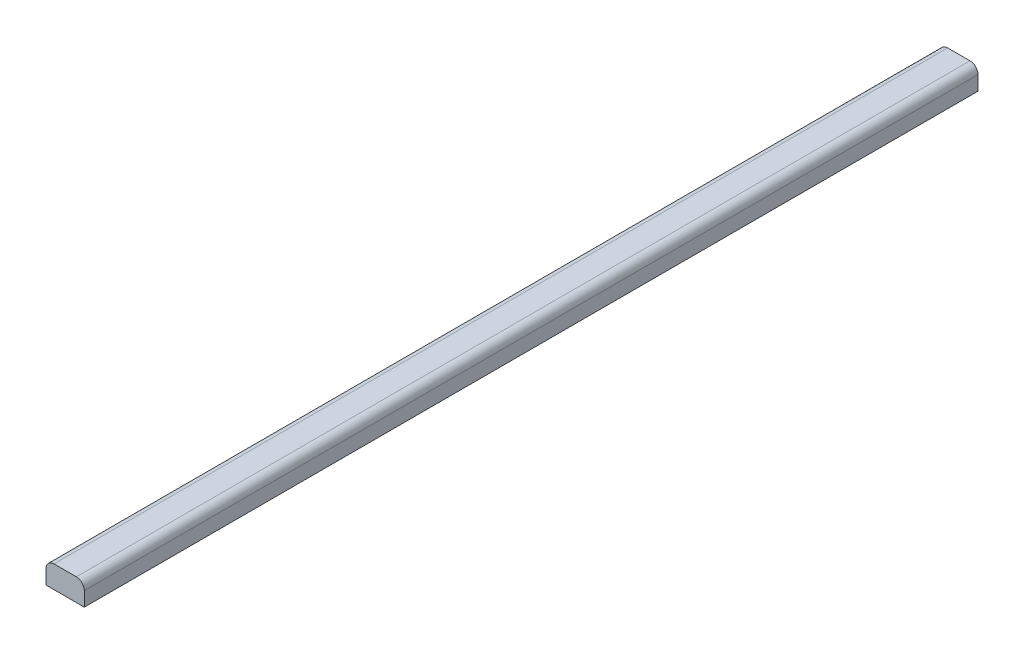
SolidWorks part; units mm, degrees
ref_plane "Front Plane" through (0, 0, 0) normal (0, 0, 1) x (1, 0, 0)
ref_plane "Top Plane" through (0, 0, 0) normal (0, 1, 0) x (1, 0, 0)
ref_plane "Right Plane" through (0, 0, 0) normal (1, 0, 0) x (0, 0, -1)
sketch "Sketch2" plane through (0, 0, 0) normal (0, 0, 1) x (1, 0, 0)
  line L0 (-2814.7066, 100.0325) -> (0, 100.0325) construction
  line L1 (-2814.7066, 115.0325) -> (-43.7201, 115.0325)
  line L2 (0, -115.0325) -> (-2814.7066, -115.0325) construction
  line L3 (-2814.7066, 110.7825) -> (0, 110.7825) construction
  line L4 (-43.1101, 114.7825) -> (-5.1101, 114.7825)
  line L5 (-43.1101, 114.7825) -> (-43.1101, 106.7825)
  line L6 (-43.1101, 106.7825) -> (-5.1101, 106.7825)
  line L7 (-5.1101, 114.7825) -> (-5.1101, 106.7825)
  line L8 (-43.1101, 114.7825) -> (-5.1101, 106.7825) construction
  line L9 (-43.1101, 106.7825) -> (-5.1101, 114.7825) construction
  line L10 (0, -110.7825) -> (-2814.7066, -110.7825) construction
  line L11 (100.8596, 57.9946) -> (93.3663, 55.1929)
  line L12 (114.7825, 19) -> (106.7825, 19)
  line L13 (114.7825, 19) -> (114.7825, -19)
  line L14 (114.7825, -19) -> (106.7825, -19)
  line L15 (106.7825, 19) -> (106.7825, -19)
  line L16 (114.7825, 19) -> (106.7825, -19) construction
  line L17 (114.7825, -19) -> (106.7825, 19) construction
  line L18 (100.8596, 57.9946) -> (114.1675, 22.401)
  line L19 (114.1675, 22.401) -> (106.6741, 19.5994)
  line L20 (93.3663, 55.1929) -> (106.6741, 19.5994)
  line L21 (100.8596, 57.9946) -> (106.6741, 19.5994) construction
  line L22 (114.1675, 22.401) -> (93.3663, 55.1929) construction
  line L23 (74.1623, 89.6438) -> (68.1246, 84.3953)
  line L24 (74.1623, 89.6438) -> (99.0925, 60.9648)
  line L25 (99.0925, 60.9648) -> (93.0548, 55.7163)
  line L26 (68.1246, 84.3953) -> (93.0548, 55.7163)
  line L27 (74.1623, 89.6438) -> (93.0548, 55.7163) construction
  line L28 (99.0925, 60.9648) -> (68.1246, 84.3953) construction
  line L29 (38.0718, 109.9391) -> (34.2545, 102.9086)
  line L30 (38.0718, 109.9391) -> (71.4668, 91.8071)
  line L31 (71.4668, 91.8071) -> (67.6496, 84.7765)
  line L32 (34.2545, 102.9086) -> (67.6496, 84.7765)
  line L33 (38.0718, 109.9391) -> (67.6496, 84.7765) construction
  line L34 (71.4668, 91.8071) -> (34.2545, 102.9086) construction
  line L35 (-2.8407, 116.31) -> (-3.9541, 108.3879)
  line L36 (-2.8407, 116.31) -> (34.7894, 111.0214)
  line L37 (34.7894, 111.0214) -> (33.6761, 103.0993)
  line L38 (-3.9541, 108.3879) -> (33.6761, 103.0993)
  line L39 (-2.8407, 116.31) -> (33.6761, 103.0993) construction
  line L40 (34.7894, 111.0214) -> (-3.9541, 108.3879) construction
  line L41 (-0.0003, 0) -> (106.7825, -19) construction
  line L42 (-81.7201, 114.7825) -> (-43.7201, 114.7825)
  line L43 (-81.7201, 114.7825) -> (-81.7201, 106.7825)
  line L44 (-81.7201, 106.7825) -> (-43.7201, 106.7825)
  line L45 (-43.7201, 114.7825) -> (-43.7201, 106.7825)
  line L46 (-81.7201, 114.7825) -> (-43.7201, 106.7825) construction
  line L47 (-81.7201, 106.7825) -> (-43.7201, 114.7825) construction
  line L48 (-120.3301, 114.7825) -> (-82.3301, 114.7825)
  line L49 (-120.3301, 114.7825) -> (-120.3301, 106.7825)
  line L50 (-120.3301, 106.7825) -> (-82.3301, 106.7825)
  line L51 (-82.3301, 114.7825) -> (-82.3301, 106.7825)
  line L52 (-120.3301, 114.7825) -> (-82.3301, 106.7825) construction
  line L53 (-120.3301, 106.7825) -> (-82.3301, 114.7825) construction
  line L54 (-158.9401, 114.7825) -> (-120.9401, 114.7825)
  line L55 (-158.9401, 114.7825) -> (-158.9401, 106.7825)
  line L56 (-158.9401, 106.7825) -> (-120.9401, 106.7825)
  line L57 (-120.9401, 114.7825) -> (-120.9401, 106.7825)
  line L58 (-158.9401, 114.7825) -> (-120.9401, 106.7825) construction
  line L59 (-158.9401, 106.7825) -> (-120.9401, 114.7825) construction
  line L60 (-197.5501, 114.7825) -> (-159.5501, 114.7825)
  line L61 (-197.5501, 114.7825) -> (-197.5501, 106.7825)
  line L62 (-197.5501, 106.7825) -> (-159.5501, 106.7825)
  line L63 (-159.5501, 114.7825) -> (-159.5501, 106.7825)
  line L64 (-197.5501, 114.7825) -> (-159.5501, 106.7825) construction
  line L65 (-197.5501, 106.7825) -> (-159.5501, 114.7825) construction
  line L66 (-236.1601, 114.7825) -> (-198.1601, 114.7825)
  line L67 (-236.1601, 114.7825) -> (-236.1601, 106.7825)
  line L68 (-236.1601, 106.7825) -> (-198.1601, 106.7825)
  line L69 (-198.1601, 114.7825) -> (-198.1601, 106.7825)
  line L70 (-236.1601, 114.7825) -> (-198.1601, 106.7825) construction
  line L71 (-236.1601, 106.7825) -> (-198.1601, 114.7825) construction
  line L72 (-274.7701, 114.7825) -> (-236.7701, 114.7825)
  line L73 (-274.7701, 114.7825) -> (-274.7701, 106.7825)
  line L74 (-274.7701, 106.7825) -> (-236.7701, 106.7825)
  line L75 (-236.7701, 114.7825) -> (-236.7701, 106.7825)
  line L76 (-274.7701, 114.7825) -> (-236.7701, 106.7825) construction
  line L77 (-274.7701, 106.7825) -> (-236.7701, 114.7825) construction
  line L78 (-313.3801, 114.7825) -> (-275.3801, 114.7825)
  line L79 (-313.3801, 114.7825) -> (-313.3801, 106.7825)
  line L80 (-313.3801, 106.7825) -> (-275.3801, 106.7825)
  line L81 (-275.3801, 114.7825) -> (-275.3801, 106.7825)
  line L82 (-313.3801, 114.7825) -> (-275.3801, 106.7825) construction
  line L83 (-313.3801, 106.7825) -> (-275.3801, 114.7825) construction
  line L84 (-351.9901, 114.7825) -> (-313.9901, 114.7825)
  line L85 (-351.9901, 114.7825) -> (-351.9901, 106.7825)
  line L86 (-351.9901, 106.7825) -> (-313.9901, 106.7825)
  line L87 (-313.9901, 114.7825) -> (-313.9901, 106.7825)
  line L88 (-351.9901, 114.7825) -> (-313.9901, 106.7825) construction
  line L89 (-351.9901, 106.7825) -> (-313.9901, 114.7825) construction
  line L90 (-390.6001, 114.7825) -> (-352.6001, 114.7825)
  line L91 (-390.6001, 114.7825) -> (-390.6001, 106.7825)
  line L92 (-390.6001, 106.7825) -> (-352.6001, 106.7825)
  line L93 (-352.6001, 114.7825) -> (-352.6001, 106.7825)
  line L94 (-390.6001, 114.7825) -> (-352.6001, 106.7825) construction
  line L95 (-390.6001, 106.7825) -> (-352.6001, 114.7825) construction
  line L96 (-429.2101, 114.7825) -> (-391.2101, 114.7825)
  line L97 (-429.2101, 114.7825) -> (-429.2101, 106.7825)
  line L98 (-429.2101, 106.7825) -> (-391.2101, 106.7825)
  line L99 (-391.2101, 114.7825) -> (-391.2101, 106.7825)
  line L100 (-429.2101, 114.7825) -> (-391.2101, 106.7825) construction
  line L101 (-429.2101, 106.7825) -> (-391.2101, 114.7825) construction
  line L102 (-467.8201, 114.7825) -> (-429.8201, 114.7825)
  line L103 (-467.8201, 114.7825) -> (-467.8201, 106.7825)
  line L104 (-467.8201, 106.7825) -> (-429.8201, 106.7825)
  line L105 (-429.8201, 114.7825) -> (-429.8201, 106.7825)
  line L106 (-467.8201, 114.7825) -> (-429.8201, 106.7825) construction
  line L107 (-467.8201, 106.7825) -> (-429.8201, 114.7825) construction
  line L108 (-506.4301, 114.7825) -> (-468.4301, 114.7825)
  line L109 (-506.4301, 114.7825) -> (-506.4301, 106.7825)
  line L110 (-506.4301, 106.7825) -> (-468.4301, 106.7825)
  line L111 (-468.4301, 114.7825) -> (-468.4301, 106.7825)
  line L112 (-506.4301, 114.7825) -> (-468.4301, 106.7825) construction
  line L113 (-506.4301, 106.7825) -> (-468.4301, 114.7825) construction
  line L114 (-545.0401, 114.7825) -> (-507.0401, 114.7825)
  line L115 (-545.0401, 114.7825) -> (-545.0401, 106.7825)
  line L116 (-545.0401, 106.7825) -> (-507.0401, 106.7825)
  line L117 (-507.0401, 114.7825) -> (-507.0401, 106.7825)
  line L118 (-545.0401, 114.7825) -> (-507.0401, 106.7825) construction
  line L119 (-545.0401, 106.7825) -> (-507.0401, 114.7825) construction
  line L120 (-583.6501, 114.7825) -> (-545.6501, 114.7825)
  line L121 (-583.6501, 114.7825) -> (-583.6501, 106.7825)
  line L122 (-583.6501, 106.7825) -> (-545.6501, 106.7825)
  line L123 (-545.6501, 114.7825) -> (-545.6501, 106.7825)
  line L124 (-583.6501, 114.7825) -> (-545.6501, 106.7825) construction
  line L125 (-583.6501, 106.7825) -> (-545.6501, 114.7825) construction
  line L126 (-622.2601, 114.7825) -> (-584.2601, 114.7825)
  line L127 (-622.2601, 114.7825) -> (-622.2601, 106.7825)
  line L128 (-622.2601, 106.7825) -> (-584.2601, 106.7825)
  line L129 (-584.2601, 114.7825) -> (-584.2601, 106.7825)
  line L130 (-622.2601, 114.7825) -> (-584.2601, 106.7825) construction
  line L131 (-622.2601, 106.7825) -> (-584.2601, 114.7825) construction
  line L132 (-660.8701, 114.7825) -> (-622.8701, 114.7825)
  line L133 (-660.8701, 114.7825) -> (-660.8701, 106.7825)
  line L134 (-660.8701, 106.7825) -> (-622.8701, 106.7825)
  line L135 (-622.8701, 114.7825) -> (-622.8701, 106.7825)
  line L136 (-660.8701, 114.7825) -> (-622.8701, 106.7825) construction
  line L137 (-660.8701, 106.7825) -> (-622.8701, 114.7825) construction
  line L138 (-699.4801, 114.7825) -> (-661.4801, 114.7825)
  line L139 (-699.4801, 114.7825) -> (-699.4801, 106.7825)
  line L140 (-699.4801, 106.7825) -> (-661.4801, 106.7825)
  line L141 (-661.4801, 114.7825) -> (-661.4801, 106.7825)
  line L142 (-699.4801, 114.7825) -> (-661.4801, 106.7825) construction
  line L143 (-699.4801, 106.7825) -> (-661.4801, 114.7825) construction
  line L144 (-738.0901, 114.7825) -> (-700.0901, 114.7825)
  line L145 (-738.0901, 114.7825) -> (-738.0901, 106.7825)
  line L146 (-738.0901, 106.7825) -> (-700.0901, 106.7825)
  line L147 (-700.0901, 114.7825) -> (-700.0901, 106.7825)
  line L148 (-738.0901, 114.7825) -> (-700.0901, 106.7825) construction
  line L149 (-738.0901, 106.7825) -> (-700.0901, 114.7825) construction
  line L150 (-776.7001, 114.7825) -> (-738.7001, 114.7825)
  line L151 (-776.7001, 114.7825) -> (-776.7001, 106.7825)
  line L152 (-776.7001, 106.7825) -> (-738.7001, 106.7825)
  line L153 (-738.7001, 114.7825) -> (-738.7001, 106.7825)
  line L154 (-776.7001, 114.7825) -> (-738.7001, 106.7825) construction
  line L155 (-776.7001, 106.7825) -> (-738.7001, 114.7825) construction
  line L156 (-815.3101, 114.7825) -> (-777.3101, 114.7825)
  line L157 (-815.3101, 114.7825) -> (-815.3101, 106.7825)
  line L158 (-815.3101, 106.7825) -> (-777.3101, 106.7825)
  line L159 (-777.3101, 114.7825) -> (-777.3101, 106.7825)
  line L160 (-815.3101, 114.7825) -> (-777.3101, 106.7825) construction
  line L161 (-815.3101, 106.7825) -> (-777.3101, 114.7825) construction
  line L162 (-853.9201, 114.7825) -> (-815.9201, 114.7825)
  line L163 (-853.9201, 114.7825) -> (-853.9201, 106.7825)
  line L164 (-853.9201, 106.7825) -> (-815.9201, 106.7825)
  line L165 (-815.9201, 114.7825) -> (-815.9201, 106.7825)
  line L166 (-853.9201, 114.7825) -> (-815.9201, 106.7825) construction
  line L167 (-853.9201, 106.7825) -> (-815.9201, 114.7825) construction
  line L168 (-892.5301, 114.7825) -> (-854.5301, 114.7825)
  line L169 (-892.5301, 114.7825) -> (-892.5301, 106.7825)
  line L170 (-892.5301, 106.7825) -> (-854.5301, 106.7825)
  line L171 (-854.5301, 114.7825) -> (-854.5301, 106.7825)
  line L172 (-892.5301, 114.7825) -> (-854.5301, 106.7825) construction
  line L173 (-892.5301, 106.7825) -> (-854.5301, 114.7825) construction
  line L174 (-931.1401, 114.7825) -> (-893.1401, 114.7825)
  line L175 (-931.1401, 114.7825) -> (-931.1401, 106.7825)
  line L176 (-931.1401, 106.7825) -> (-893.1401, 106.7825)
  line L177 (-893.1401, 114.7825) -> (-893.1401, 106.7825)
  line L178 (-931.1401, 114.7825) -> (-893.1401, 106.7825) construction
  line L179 (-931.1401, 106.7825) -> (-893.1401, 114.7825) construction
  line L180 (-969.7501, 114.7825) -> (-931.7501, 114.7825)
  line L181 (-969.7501, 114.7825) -> (-969.7501, 106.7825)
  line L182 (-969.7501, 106.7825) -> (-931.7501, 106.7825)
  line L183 (-931.7501, 114.7825) -> (-931.7501, 106.7825)
  line L184 (-969.7501, 114.7825) -> (-931.7501, 106.7825) construction
  line L185 (-969.7501, 106.7825) -> (-931.7501, 114.7825) construction
  line L186 (-1008.3601, 114.7825) -> (-970.3601, 114.7825)
  line L187 (-1008.3601, 114.7825) -> (-1008.3601, 106.7825)
  line L188 (-1008.3601, 106.7825) -> (-970.3601, 106.7825)
  line L189 (-970.3601, 114.7825) -> (-970.3601, 106.7825)
  line L190 (-1008.3601, 114.7825) -> (-970.3601, 106.7825) construction
  line L191 (-1008.3601, 106.7825) -> (-970.3601, 114.7825) construction
  line L192 (-1046.9701, 114.7825) -> (-1008.9701, 114.7825)
  line L193 (-1046.9701, 114.7825) -> (-1046.9701, 106.7825)
  line L194 (-1046.9701, 106.7825) -> (-1008.9701, 106.7825)
  line L195 (-1008.9701, 114.7825) -> (-1008.9701, 106.7825)
  line L196 (-1046.9701, 114.7825) -> (-1008.9701, 106.7825) construction
  line L197 (-1046.9701, 106.7825) -> (-1008.9701, 114.7825) construction
  line L198 (-1085.5801, 114.7825) -> (-1047.5801, 114.7825)
  line L199 (-1085.5801, 114.7825) -> (-1085.5801, 106.7825)
  line L200 (-1085.5801, 106.7825) -> (-1047.5801, 106.7825)
  line L201 (-1047.5801, 114.7825) -> (-1047.5801, 106.7825)
  line L202 (-1085.5801, 114.7825) -> (-1047.5801, 106.7825) construction
  line L203 (-1085.5801, 106.7825) -> (-1047.5801, 114.7825) construction
  line L204 (-1124.1901, 114.7825) -> (-1086.1901, 114.7825)
  line L205 (-1124.1901, 114.7825) -> (-1124.1901, 106.7825)
  line L206 (-1124.1901, 106.7825) -> (-1086.1901, 106.7825)
  line L207 (-1086.1901, 114.7825) -> (-1086.1901, 106.7825)
  line L208 (-1124.1901, 114.7825) -> (-1086.1901, 106.7825) construction
  line L209 (-1124.1901, 106.7825) -> (-1086.1901, 114.7825) construction
  line L210 (-1162.8001, 114.7825) -> (-1124.8001, 114.7825)
  line L211 (-1162.8001, 114.7825) -> (-1162.8001, 106.7825)
  line L212 (-1162.8001, 106.7825) -> (-1124.8001, 106.7825)
  line L213 (-1124.8001, 114.7825) -> (-1124.8001, 106.7825)
  line L214 (-1162.8001, 114.7825) -> (-1124.8001, 106.7825) construction
  line L215 (-1162.8001, 106.7825) -> (-1124.8001, 114.7825) construction
  line L216 (-1201.4101, 114.7825) -> (-1163.4101, 114.7825)
  line L217 (-1201.4101, 114.7825) -> (-1201.4101, 106.7825)
  line L218 (-1201.4101, 106.7825) -> (-1163.4101, 106.7825)
  line L219 (-1163.4101, 114.7825) -> (-1163.4101, 106.7825)
  line L220 (-1201.4101, 114.7825) -> (-1163.4101, 106.7825) construction
  line L221 (-1201.4101, 106.7825) -> (-1163.4101, 114.7825) construction
  line L222 (-1240.0201, 114.7825) -> (-1202.0201, 114.7825)
  line L223 (-1240.0201, 114.7825) -> (-1240.0201, 106.7825)
  line L224 (-1240.0201, 106.7825) -> (-1202.0201, 106.7825)
  line L225 (-1202.0201, 114.7825) -> (-1202.0201, 106.7825)
  line L226 (-1240.0201, 114.7825) -> (-1202.0201, 106.7825) construction
  line L227 (-1240.0201, 106.7825) -> (-1202.0201, 114.7825) construction
  line L228 (-1278.6301, 114.7825) -> (-1240.6301, 114.7825)
  line L229 (-1278.6301, 114.7825) -> (-1278.6301, 106.7825)
  line L230 (-1278.6301, 106.7825) -> (-1240.6301, 106.7825)
  line L231 (-1240.6301, 114.7825) -> (-1240.6301, 106.7825)
  line L232 (-1278.6301, 114.7825) -> (-1240.6301, 106.7825) construction
  line L233 (-1278.6301, 106.7825) -> (-1240.6301, 114.7825) construction
  line L234 (-1317.2401, 114.7825) -> (-1279.2401, 114.7825)
  line L235 (-1317.2401, 114.7825) -> (-1317.2401, 106.7825)
  line L236 (-1317.2401, 106.7825) -> (-1279.2401, 106.7825)
  line L237 (-1279.2401, 114.7825) -> (-1279.2401, 106.7825)
  line L238 (-1317.2401, 114.7825) -> (-1279.2401, 106.7825) construction
  line L239 (-1317.2401, 106.7825) -> (-1279.2401, 114.7825) construction
  line L240 (-1355.8501, 114.7825) -> (-1317.8501, 114.7825)
  line L241 (-1355.8501, 114.7825) -> (-1355.8501, 106.7825)
  line L242 (-1355.8501, 106.7825) -> (-1317.8501, 106.7825)
  line L243 (-1317.8501, 114.7825) -> (-1317.8501, 106.7825)
  line L244 (-1355.8501, 114.7825) -> (-1317.8501, 106.7825) construction
  line L245 (-1355.8501, 106.7825) -> (-1317.8501, 114.7825) construction
  line L246 (-1394.4601, 114.7825) -> (-1356.4601, 114.7825)
  line L247 (-1394.4601, 114.7825) -> (-1394.4601, 106.7825)
  line L248 (-1394.4601, 106.7825) -> (-1356.4601, 106.7825)
  line L249 (-1356.4601, 114.7825) -> (-1356.4601, 106.7825)
  line L250 (-1394.4601, 114.7825) -> (-1356.4601, 106.7825) construction
  line L251 (-1394.4601, 106.7825) -> (-1356.4601, 114.7825) construction
  line L252 (-1433.0701, 114.7825) -> (-1395.0701, 114.7825)
  line L253 (-1433.0701, 114.7825) -> (-1433.0701, 106.7825)
  line L254 (-1433.0701, 106.7825) -> (-1395.0701, 106.7825)
  line L255 (-1395.0701, 114.7825) -> (-1395.0701, 106.7825)
  line L256 (-1433.0701, 114.7825) -> (-1395.0701, 106.7825) construction
  line L257 (-1433.0701, 106.7825) -> (-1395.0701, 114.7825) construction
  line L258 (-1471.6801, 114.7825) -> (-1433.6801, 114.7825)
  line L259 (-1471.6801, 114.7825) -> (-1471.6801, 106.7825)
  line L260 (-1471.6801, 106.7825) -> (-1433.6801, 106.7825)
  line L261 (-1433.6801, 114.7825) -> (-1433.6801, 106.7825)
  line L262 (-1471.6801, 114.7825) -> (-1433.6801, 106.7825) construction
  line L263 (-1471.6801, 106.7825) -> (-1433.6801, 114.7825) construction
  line L264 (-1510.2901, 114.7825) -> (-1472.2901, 114.7825)
  line L265 (-1510.2901, 114.7825) -> (-1510.2901, 106.7825)
  line L266 (-1510.2901, 106.7825) -> (-1472.2901, 106.7825)
  line L267 (-1472.2901, 114.7825) -> (-1472.2901, 106.7825)
  line L268 (-1510.2901, 114.7825) -> (-1472.2901, 106.7825) construction
  line L269 (-1510.2901, 106.7825) -> (-1472.2901, 114.7825) construction
  line L270 (-1548.9001, 114.7825) -> (-1510.9001, 114.7825)
  line L271 (-1548.9001, 114.7825) -> (-1548.9001, 106.7825)
  line L272 (-1548.9001, 106.7825) -> (-1510.9001, 106.7825)
  line L273 (-1510.9001, 114.7825) -> (-1510.9001, 106.7825)
  line L274 (-1548.9001, 114.7825) -> (-1510.9001, 106.7825) construction
  line L275 (-1548.9001, 106.7825) -> (-1510.9001, 114.7825) construction
  line L276 (-1587.5101, 114.7825) -> (-1549.5101, 114.7825)
  line L277 (-1587.5101, 114.7825) -> (-1587.5101, 106.7825)
  line L278 (-1587.5101, 106.7825) -> (-1549.5101, 106.7825)
  line L279 (-1549.5101, 114.7825) -> (-1549.5101, 106.7825)
  line L280 (-1587.5101, 114.7825) -> (-1549.5101, 106.7825) construction
  line L281 (-1587.5101, 106.7825) -> (-1549.5101, 114.7825) construction
  line L282 (-1626.1201, 114.7825) -> (-1588.1201, 114.7825)
  line L283 (-1626.1201, 114.7825) -> (-1626.1201, 106.7825)
  line L284 (-1626.1201, 106.7825) -> (-1588.1201, 106.7825)
  line L285 (-1588.1201, 114.7825) -> (-1588.1201, 106.7825)
  line L286 (-1626.1201, 114.7825) -> (-1588.1201, 106.7825) construction
  line L287 (-1626.1201, 106.7825) -> (-1588.1201, 114.7825) construction
  line L288 (-1664.7301, 114.7825) -> (-1626.7301, 114.7825)
  line L289 (-1664.7301, 114.7825) -> (-1664.7301, 106.7825)
  line L290 (-1664.7301, 106.7825) -> (-1626.7301, 106.7825)
  line L291 (-1626.7301, 114.7825) -> (-1626.7301, 106.7825)
  line L292 (-1664.7301, 114.7825) -> (-1626.7301, 106.7825) construction
  line L293 (-1664.7301, 106.7825) -> (-1626.7301, 114.7825) construction
  line L294 (-1703.3401, 114.7825) -> (-1665.3401, 114.7825)
  line L295 (-1703.3401, 114.7825) -> (-1703.3401, 106.7825)
  line L296 (-1703.3401, 106.7825) -> (-1665.3401, 106.7825)
  line L297 (-1665.3401, 114.7825) -> (-1665.3401, 106.7825)
  line L298 (-1703.3401, 114.7825) -> (-1665.3401, 106.7825) construction
  line L299 (-1703.3401, 106.7825) -> (-1665.3401, 114.7825) construction
  line L300 (-1741.9501, 114.7825) -> (-1703.9501, 114.7825)
  line L301 (-1741.9501, 114.7825) -> (-1741.9501, 106.7825)
  line L302 (-1741.9501, 106.7825) -> (-1703.9501, 106.7825)
  line L303 (-1703.9501, 114.7825) -> (-1703.9501, 106.7825)
  line L304 (-1741.9501, 114.7825) -> (-1703.9501, 106.7825) construction
  line L305 (-1741.9501, 106.7825) -> (-1703.9501, 114.7825) construction
  line L306 (-1780.5601, 114.7825) -> (-1742.5601, 114.7825)
  line L307 (-1780.5601, 114.7825) -> (-1780.5601, 106.7825)
  line L308 (-1780.5601, 106.7825) -> (-1742.5601, 106.7825)
  line L309 (-1742.5601, 114.7825) -> (-1742.5601, 106.7825)
  line L310 (-1780.5601, 114.7825) -> (-1742.5601, 106.7825) construction
  line L311 (-1780.5601, 106.7825) -> (-1742.5601, 114.7825) construction
  line L312 (-1819.1701, 114.7825) -> (-1781.1701, 114.7825)
  line L313 (-1819.1701, 114.7825) -> (-1819.1701, 106.7825)
  line L314 (-1819.1701, 106.7825) -> (-1781.1701, 106.7825)
  line L315 (-1781.1701, 114.7825) -> (-1781.1701, 106.7825)
  line L316 (-1819.1701, 114.7825) -> (-1781.1701, 106.7825) construction
  line L317 (-1819.1701, 106.7825) -> (-1781.1701, 114.7825) construction
  line L318 (-1857.7801, 114.7825) -> (-1819.7801, 114.7825)
  line L319 (-1857.7801, 114.7825) -> (-1857.7801, 106.7825)
  line L320 (-1857.7801, 106.7825) -> (-1819.7801, 106.7825)
  line L321 (-1819.7801, 114.7825) -> (-1819.7801, 106.7825)
  line L322 (-1857.7801, 114.7825) -> (-1819.7801, 106.7825) construction
  line L323 (-1857.7801, 106.7825) -> (-1819.7801, 114.7825) construction
  line L324 (-1896.3901, 114.7825) -> (-1858.3901, 114.7825)
  line L325 (-1896.3901, 114.7825) -> (-1896.3901, 106.7825)
  line L326 (-1896.3901, 106.7825) -> (-1858.3901, 106.7825)
  line L327 (-1858.3901, 114.7825) -> (-1858.3901, 106.7825)
  line L328 (-1896.3901, 114.7825) -> (-1858.3901, 106.7825) construction
  line L329 (-1896.3901, 106.7825) -> (-1858.3901, 114.7825) construction
  line L330 (-1935.0001, 114.7825) -> (-1897.0001, 114.7825)
  line L331 (-1935.0001, 114.7825) -> (-1935.0001, 106.7825)
  line L332 (-1935.0001, 106.7825) -> (-1897.0001, 106.7825)
  line L333 (-1897.0001, 114.7825) -> (-1897.0001, 106.7825)
  line L334 (-1935.0001, 114.7825) -> (-1897.0001, 106.7825) construction
  line L335 (-1935.0001, 106.7825) -> (-1897.0001, 114.7825) construction
  line L336 (-1973.6101, 114.7825) -> (-1935.6101, 114.7825)
  line L337 (-1973.6101, 114.7825) -> (-1973.6101, 106.7825)
  line L338 (-1973.6101, 106.7825) -> (-1935.6101, 106.7825)
  line L339 (-1935.6101, 114.7825) -> (-1935.6101, 106.7825)
  line L340 (-1973.6101, 114.7825) -> (-1935.6101, 106.7825) construction
  line L341 (-1973.6101, 106.7825) -> (-1935.6101, 114.7825) construction
  line L342 (-2012.2201, 114.7825) -> (-1974.2201, 114.7825)
  line L343 (-2012.2201, 114.7825) -> (-2012.2201, 106.7825)
  line L344 (-2012.2201, 106.7825) -> (-1974.2201, 106.7825)
  line L345 (-1974.2201, 114.7825) -> (-1974.2201, 106.7825)
  line L346 (-2012.2201, 114.7825) -> (-1974.2201, 106.7825) construction
  line L347 (-2012.2201, 106.7825) -> (-1974.2201, 114.7825) construction
  line L348 (-2050.8301, 114.7825) -> (-2012.8301, 114.7825)
  line L349 (-2050.8301, 114.7825) -> (-2050.8301, 106.7825)
  line L350 (-2050.8301, 106.7825) -> (-2012.8301, 106.7825)
  line L351 (-2012.8301, 114.7825) -> (-2012.8301, 106.7825)
  line L352 (-2050.8301, 114.7825) -> (-2012.8301, 106.7825) construction
  line L353 (-2050.8301, 106.7825) -> (-2012.8301, 114.7825) construction
  line L354 (-2089.4401, 114.7825) -> (-2051.4401, 114.7825)
  line L355 (-2089.4401, 114.7825) -> (-2089.4401, 106.7825)
  line L356 (-2089.4401, 106.7825) -> (-2051.4401, 106.7825)
  line L357 (-2051.4401, 114.7825) -> (-2051.4401, 106.7825)
  line L358 (-2089.4401, 114.7825) -> (-2051.4401, 106.7825) construction
  line L359 (-2089.4401, 106.7825) -> (-2051.4401, 114.7825) construction
  line L360 (-2128.0501, 114.7825) -> (-2090.0501, 114.7825)
  line L361 (-2128.0501, 114.7825) -> (-2128.0501, 106.7825)
  line L362 (-2128.0501, 106.7825) -> (-2090.0501, 106.7825)
  line L363 (-2090.0501, 114.7825) -> (-2090.0501, 106.7825)
  line L364 (-2128.0501, 114.7825) -> (-2090.0501, 106.7825) construction
  line L365 (-2128.0501, 106.7825) -> (-2090.0501, 114.7825) construction
  line L366 (-2166.6601, 114.7825) -> (-2128.6601, 114.7825)
  line L367 (-2166.6601, 114.7825) -> (-2166.6601, 106.7825)
  line L368 (-2166.6601, 106.7825) -> (-2128.6601, 106.7825)
  line L369 (-2128.6601, 114.7825) -> (-2128.6601, 106.7825)
  line L370 (-2166.6601, 114.7825) -> (-2128.6601, 106.7825) construction
  line L371 (-2166.6601, 106.7825) -> (-2128.6601, 114.7825) construction
  line L372 (-2205.2701, 114.7825) -> (-2167.2701, 114.7825)
  line L373 (-2205.2701, 114.7825) -> (-2205.2701, 106.7825)
  line L374 (-2205.2701, 106.7825) -> (-2167.2701, 106.7825)
  line L375 (-2167.2701, 114.7825) -> (-2167.2701, 106.7825)
  line L376 (-2205.2701, 114.7825) -> (-2167.2701, 106.7825) construction
  line L377 (-2205.2701, 106.7825) -> (-2167.2701, 114.7825) construction
  line L378 (-2243.8801, 114.7825) -> (-2205.8801, 114.7825)
  line L379 (-2243.8801, 114.7825) -> (-2243.8801, 106.7825)
  line L380 (-2243.8801, 106.7825) -> (-2205.8801, 106.7825)
  line L381 (-2205.8801, 114.7825) -> (-2205.8801, 106.7825)
  line L382 (-2243.8801, 114.7825) -> (-2205.8801, 106.7825) construction
  line L383 (-2243.8801, 106.7825) -> (-2205.8801, 114.7825) construction
  line L384 (-2282.4901, 114.7825) -> (-2244.4901, 114.7825)
  line L385 (-2282.4901, 114.7825) -> (-2282.4901, 106.7825)
  line L386 (-2282.4901, 106.7825) -> (-2244.4901, 106.7825)
  line L387 (-2244.4901, 114.7825) -> (-2244.4901, 106.7825)
  line L388 (-2282.4901, 114.7825) -> (-2244.4901, 106.7825) construction
  line L389 (-2282.4901, 106.7825) -> (-2244.4901, 114.7825) construction
  line L390 (-2321.1001, 114.7825) -> (-2283.1001, 114.7825)
  line L391 (-2321.1001, 114.7825) -> (-2321.1001, 106.7825)
  line L392 (-2321.1001, 106.7825) -> (-2283.1001, 106.7825)
  line L393 (-2283.1001, 114.7825) -> (-2283.1001, 106.7825)
  line L394 (-2321.1001, 114.7825) -> (-2283.1001, 106.7825) construction
  line L395 (-2321.1001, 106.7825) -> (-2283.1001, 114.7825) construction
  line L396 (-2359.7101, 114.7825) -> (-2321.7101, 114.7825)
  line L397 (-2359.7101, 114.7825) -> (-2359.7101, 106.7825)
  line L398 (-2359.7101, 106.7825) -> (-2321.7101, 106.7825)
  line L399 (-2321.7101, 114.7825) -> (-2321.7101, 106.7825)
  line L400 (-2359.7101, 114.7825) -> (-2321.7101, 106.7825) construction
  line L401 (-2359.7101, 106.7825) -> (-2321.7101, 114.7825) construction
  line L402 (-2398.3201, 114.7825) -> (-2360.3201, 114.7825)
  line L403 (-2398.3201, 114.7825) -> (-2398.3201, 106.7825)
  line L404 (-2398.3201, 106.7825) -> (-2360.3201, 106.7825)
  line L405 (-2360.3201, 114.7825) -> (-2360.3201, 106.7825)
  line L406 (-2398.3201, 114.7825) -> (-2360.3201, 106.7825) construction
  line L407 (-2398.3201, 106.7825) -> (-2360.3201, 114.7825) construction
  line L408 (-2436.9301, 114.7825) -> (-2398.9301, 114.7825)
  line L409 (-2436.9301, 114.7825) -> (-2436.9301, 106.7825)
  line L410 (-2436.9301, 106.7825) -> (-2398.9301, 106.7825)
  line L411 (-2398.9301, 114.7825) -> (-2398.9301, 106.7825)
  line L412 (-2436.9301, 114.7825) -> (-2398.9301, 106.7825) construction
  line L413 (-2436.9301, 106.7825) -> (-2398.9301, 114.7825) construction
  line L414 (-2475.5401, 114.7825) -> (-2437.5401, 114.7825)
  line L415 (-2475.5401, 114.7825) -> (-2475.5401, 106.7825)
  line L416 (-2475.5401, 106.7825) -> (-2437.5401, 106.7825)
  line L417 (-2437.5401, 114.7825) -> (-2437.5401, 106.7825)
  line L418 (-2475.5401, 114.7825) -> (-2437.5401, 106.7825) construction
  line L419 (-2475.5401, 106.7825) -> (-2437.5401, 114.7825) construction
  line L420 (-2514.1501, 114.7825) -> (-2476.1501, 114.7825)
  line L421 (-2514.1501, 114.7825) -> (-2514.1501, 106.7825)
  line L422 (-2514.1501, 106.7825) -> (-2476.1501, 106.7825)
  line L423 (-2476.1501, 114.7825) -> (-2476.1501, 106.7825)
  line L424 (-2514.1501, 114.7825) -> (-2476.1501, 106.7825) construction
  line L425 (-2514.1501, 106.7825) -> (-2476.1501, 114.7825) construction
  line L426 (-2552.7601, 114.7825) -> (-2514.7601, 114.7825)
  line L427 (-2552.7601, 114.7825) -> (-2552.7601, 106.7825)
  line L428 (-2552.7601, 106.7825) -> (-2514.7601, 106.7825)
  line L429 (-2514.7601, 114.7825) -> (-2514.7601, 106.7825)
  line L430 (-2552.7601, 114.7825) -> (-2514.7601, 106.7825) construction
  line L431 (-2552.7601, 106.7825) -> (-2514.7601, 114.7825) construction
  line L432 (-2591.3701, 114.7825) -> (-2553.3701, 114.7825)
  line L433 (-2591.3701, 114.7825) -> (-2591.3701, 106.7825)
  line L434 (-2591.3701, 106.7825) -> (-2553.3701, 106.7825)
  line L435 (-2553.3701, 114.7825) -> (-2553.3701, 106.7825)
  line L436 (-2591.3701, 114.7825) -> (-2553.3701, 106.7825) construction
  line L437 (-2591.3701, 106.7825) -> (-2553.3701, 114.7825) construction
  line L438 (-2629.9801, 114.7825) -> (-2591.9801, 114.7825)
  line L439 (-2629.9801, 114.7825) -> (-2629.9801, 106.7825)
  line L440 (-2629.9801, 106.7825) -> (-2591.9801, 106.7825)
  line L441 (-2591.9801, 114.7825) -> (-2591.9801, 106.7825)
  line L442 (-2629.9801, 114.7825) -> (-2591.9801, 106.7825) construction
  line L443 (-2629.9801, 106.7825) -> (-2591.9801, 114.7825) construction
  line L444 (-2668.5901, 114.7825) -> (-2630.5901, 114.7825)
  line L445 (-2668.5901, 114.7825) -> (-2668.5901, 106.7825)
  line L446 (-2668.5901, 106.7825) -> (-2630.5901, 106.7825)
  line L447 (-2630.5901, 114.7825) -> (-2630.5901, 106.7825)
  line L448 (-2668.5901, 114.7825) -> (-2630.5901, 106.7825) construction
  line L449 (-2668.5901, 106.7825) -> (-2630.5901, 114.7825) construction
  line L450 (-2707.2001, 114.7825) -> (-2669.2001, 114.7825)
  line L451 (-2707.2001, 114.7825) -> (-2707.2001, 106.7825)
  line L452 (-2707.2001, 106.7825) -> (-2669.2001, 106.7825)
  line L453 (-2669.2001, 114.7825) -> (-2669.2001, 106.7825)
  line L454 (-2707.2001, 114.7825) -> (-2669.2001, 106.7825) construction
  line L455 (-2707.2001, 106.7825) -> (-2669.2001, 114.7825) construction
  line L456 (-2745.8101, 114.7825) -> (-2707.8101, 114.7825)
  line L457 (-2745.8101, 114.7825) -> (-2745.8101, 106.7825)
  line L458 (-2745.8101, 106.7825) -> (-2707.8101, 106.7825)
  line L459 (-2707.8101, 114.7825) -> (-2707.8101, 106.7825)
  line L460 (-2745.8101, 114.7825) -> (-2707.8101, 106.7825) construction
  line L461 (-2745.8101, 106.7825) -> (-2707.8101, 114.7825) construction
  line L462 (-2784.4201, 114.7825) -> (-2746.4201, 114.7825)
  line L463 (-2784.4201, 114.7825) -> (-2784.4201, 106.7825)
  line L464 (-2784.4201, 106.7825) -> (-2746.4201, 106.7825)
  line L465 (-2746.4201, 114.7825) -> (-2746.4201, 106.7825)
  line L466 (-2784.4201, 114.7825) -> (-2746.4201, 106.7825) construction
  line L467 (-2784.4201, 106.7825) -> (-2746.4201, 114.7825) construction
  line L468 (-2823.0301, 114.7825) -> (-2785.0301, 114.7825)
  line L469 (-2823.0301, 114.7825) -> (-2823.0301, 106.7825)
  line L470 (-2823.0301, 106.7825) -> (-2785.0301, 106.7825)
  line L471 (-2785.0301, 114.7825) -> (-2785.0301, 106.7825)
  line L472 (-2823.0301, 114.7825) -> (-2785.0301, 106.7825) construction
  line L473 (-2823.0301, 106.7825) -> (-2785.0301, 114.7825) construction
  line L474 (-4.3831, 116.5123) -> (-43.7201, 115.0325)
  line L475 (-43.7201, 113.7626) -> (-43.7201, 116.4131) construction
  line L477 (-2814.7066, 115.0325) -> (0, 115.0325) construction
  line L478 (-2814.7066, 106.5325) -> (0, 106.5325)
  line L479 (-2814.7066, 106.5325) -> (-43.5603, 106.5325) construction
  line L480 (-4.0636, 108.0183) -> (-43.5603, 106.5325) construction
  line L481 (0, 0) -> (-3348.6754, 0) construction
  arc A0 (0, 115.0325) -> (0, -115.0325) centre (0, 0) cw construction
  arc A1 (0, 110.7825) -> (0, -110.7825) centre (0, 0) cw construction
  circle A2 centre (-0.0003, 0) radius 116.3447 construction
  arc A3 (-106.7825, 0) -> (-37.3631, 100.0325) centre (0, 0) ccw construction
  arc A5 (-106.5325, 0) -> (0, 106.5325) centre (0, 0) ccw
  circle A6 centre (0, 0) radius 106.5325 construction
  circle A7 centre (0, 0) radius 106.7825 construction
  arc A9 (-116.595, 0) -> (-4.3831, 116.5123) centre (-0.0003, 0) ccw
  point P9 (-24.1101, 110.7825)
  point P20 (110.7825, 0)
  point P22 (-62.7201, 110.7825)
  point P23 (110.7825, 0)
  point P28 (103.7669, 38.797)
  point P33 (83.6085, 72.6801)
  point P38 (52.8607, 97.3578)
  point P43 (15.4177, 109.7046)
  point P54 (-101.3301, 110.7825)
  point P59 (-139.9401, 110.7825)
  point P64 (-178.5501, 110.7825)
  point P69 (-217.1601, 110.7825)
  point P74 (-255.7701, 110.7825)
  point P79 (-294.3801, 110.7825)
  point P84 (-332.9901, 110.7825)
  point P89 (-371.6001, 110.7825)
  point P94 (-410.2101, 110.7825)
  point P99 (-448.8201, 110.7825)
  point P104 (-487.4301, 110.7825)
  point P109 (-526.0401, 110.7825)
  point P114 (-564.6501, 110.7825)
  point P119 (-603.2601, 110.7825)
  point P124 (-641.8701, 110.7825)
  point P129 (-680.4801, 110.7825)
  point P134 (-719.0901, 110.7825)
  point P139 (-757.7001, 110.7825)
  point P144 (-796.3101, 110.7825)
  point P149 (-834.9201, 110.7825)
  point P154 (-873.5301, 110.7825)
  point P159 (-912.1401, 110.7825)
  point P164 (-950.7501, 110.7825)
  point P169 (-989.3601, 110.7825)
  point P174 (-1027.9701, 110.7825)
  point P179 (-1066.5801, 110.7825)
  point P184 (-1105.1901, 110.7825)
  point P189 (-1143.8001, 110.7825)
  point P194 (-1182.4101, 110.7825)
  point P199 (-1221.0201, 110.7825)
  point P204 (-1259.6301, 110.7825)
  point P209 (-1298.2401, 110.7825)
  point P214 (-1336.8501, 110.7825)
  point P219 (-1375.4601, 110.7825)
  point P224 (-1414.0701, 110.7825)
  point P229 (-1452.6801, 110.7825)
  point P234 (-1491.2901, 110.7825)
  point P239 (-1529.9001, 110.7825)
  point P244 (-1568.5101, 110.7825)
  point P249 (-1607.1201, 110.7825)
  point P254 (-1645.7301, 110.7825)
  point P259 (-1684.3401, 110.7825)
  point P264 (-1722.9501, 110.7825)
  point P269 (-1761.5601, 110.7825)
  point P274 (-1800.1701, 110.7825)
  point P279 (-1838.7801, 110.7825)
  point P284 (-1877.3901, 110.7825)
  point P289 (-1916.0001, 110.7825)
  point P294 (-1954.6101, 110.7825)
  point P299 (-1993.2201, 110.7825)
  point P304 (-2031.8301, 110.7825)
  point P309 (-2070.4401, 110.7825)
  point P314 (-2109.0501, 110.7825)
  point P319 (-2147.6601, 110.7825)
  point P324 (-2186.2701, 110.7825)
  point P329 (-2224.8801, 110.7825)
  point P334 (-2263.4901, 110.7825)
  point P339 (-2302.1001, 110.7825)
  point P344 (-2340.7101, 110.7825)
  point P349 (-2379.3201, 110.7825)
  point P354 (-2417.9301, 110.7825)
  point P359 (-2456.5401, 110.7825)
  point P364 (-2495.1501, 110.7825)
  point P369 (-2533.7601, 110.7825)
  point P374 (-2572.3701, 110.7825)
  point P379 (-2610.9801, 110.7825)
  point P384 (-2649.5901, 110.7825)
  point P389 (-2688.2001, 110.7825)
  point P394 (-2726.8101, 110.7825)
  point P399 (-2765.4201, 110.7825)
  point P404 (-2804.0301, 110.7825)
  dimension "D6" = 115.0325
  dimension "D1" = 15
  dimension "D2" = 38
  dimension "D3" = 8
  dimension "D7" = 38
  dimension "D8" = 8
  dimension "D10" = 108.46
  dimension "D11" = 73
  dimension "D12" = 0.6091
  dimension "D15" = 8.5
  dimension "D4" = 4.25
  dimension "D5" = 4.25
  dimension "D14" = 0.25
  dimension "D9" = 5
sketch "Sketch3" plane through (0, 0, 0) normal (0, 0, 1) x (1, 0, 0)
  line L0 (0, 0) -> (0, 124.6571) construction
  line L1 (92, -12) -> (83, -12)
  line L2 (97, -7) -> (97, 7)
  line L3 (-2814.7066, 90) -> (0, 90)
  line L8 (92, 12) -> (83, 12)
  line L9 (83, -12) -> (83, 12)
  line L10 (97, -12) -> (83, 12) construction
  line L16 (97, 12) -> (83, -12) construction
  line L17 (0, 0) -> (159.6181, 0) construction
  line L21 (0, 97.7523) -> (-2814.7066, 97.7523)
  line L22 (-2814.7066, 97.7523) -> (-2814.7066, 82.5)
  line L27 (-2814.7066, 82.5) -> (0, 82.5)
  line L40 (91.4885, 15.4226) -> (82.8817, 12.7912)
  line L41 (94.8081, 21.666) -> (90.7149, 35.0542)
  line L58 (84.4716, 38.3739) -> (75.8648, 35.7426)
  line L59 (82.8817, 12.7912) -> (75.8648, 35.7426)
  line L76 (96.27, 16.8844) -> (75.8648, 35.7426) construction
  line L77 (89.2531, 39.8358) -> (82.8817, 12.7912) construction
  line L94 (82.9817, 41.4973) -> (75.5204, 36.4646)
  line L95 (84.331, 48.4385) -> (76.5023, 60.045)
  line L112 (69.5611, 61.3942) -> (62.0998, 56.3615)
  line L113 (75.5204, 36.4646) -> (62.0998, 56.3615)
  line L130 (87.1269, 44.2933) -> (62.0998, 56.3615) construction
  line L131 (73.7063, 64.1902) -> (75.5204, 36.4646) construction
  line L136 (67.2232, 63.9456) -> (61.5593, 56.9513)
  line L137 (66.4841, 70.9779) -> (55.604, 79.7884)
  line L142 (-16.9626, 92.0001) -> (-16.9626, 83.0001)
  line L143 (-21.9626, 97.0001) -> (-35.9626, 97.0001)
  line L148 (-40.9626, 92.0001) -> (-40.9626, 83.0001)
  line L149 (-16.9626, 83.0001) -> (-40.9626, 83.0001)
  line L154 (-16.9627, 97) -> (-40.9626, 83.0001) construction
  line L155 (-40.9627, 97) -> (-16.9626, 83.0001) construction
  line L160 (-16.3996, 83.0001) -> (-16.3996, 77.7064) construction
  line L161 (-16.9626, 83.0001) -> (-16.9626, 77.7064) construction
  line L166 (-41.5226, 92.0001) -> (-41.5226, 83.0001)
  line L167 (-46.5226, 97.0001) -> (-60.5226, 97.0001)
  line L172 (-65.5226, 92.0001) -> (-65.5226, 83.0001)
  line L173 (-41.5226, 83.0001) -> (-65.5226, 83.0001)
  line L178 (-66.0826, 92.0001) -> (-66.0826, 83.0001)
  line L179 (-71.0826, 97.0001) -> (-85.0826, 97.0001)
  line L184 (-90.0826, 92.0001) -> (-90.0826, 83.0001)
  line L185 (-66.0826, 83.0001) -> (-90.0826, 83.0001)
  line L190 (-90.6426, 92.0001) -> (-90.6426, 83.0001)
  line L191 (-95.6426, 97.0001) -> (-109.6426, 97.0001)
  line L196 (-114.6426, 92.0001) -> (-114.6426, 83.0001)
  line L197 (-90.6426, 83.0001) -> (-114.6426, 83.0001)
  line L202 (-115.2026, 92.0001) -> (-115.2026, 83.0001)
  line L203 (-120.2026, 97.0001) -> (-134.2026, 97.0001)
  line L208 (-139.2026, 92.0001) -> (-139.2026, 83.0001)
  line L209 (-115.2026, 83.0001) -> (-139.2026, 83.0001)
  line L214 (-139.7626, 92.0001) -> (-139.7626, 83.0001)
  line L215 (-144.7626, 97.0001) -> (-158.7626, 97.0001)
  line L220 (-163.7626, 92.0001) -> (-163.7626, 83.0001)
  line L221 (-139.7626, 83.0001) -> (-163.7626, 83.0001)
  line L226 (-164.3226, 92.0001) -> (-164.3226, 83.0001)
  line L227 (-169.3226, 97.0001) -> (-183.3226, 97.0001)
  line L232 (-188.3226, 92.0001) -> (-188.3226, 83.0001)
  line L233 (-164.3226, 83.0001) -> (-188.3226, 83.0001)
  line L238 (-188.8826, 92.0001) -> (-188.8826, 83.0001)
  line L239 (-193.8826, 97.0001) -> (-207.8826, 97.0001)
  line L244 (-212.8826, 92.0001) -> (-212.8826, 83.0001)
  line L245 (-188.8826, 83.0001) -> (-212.8826, 83.0001)
  line L250 (-213.4426, 92.0001) -> (-213.4426, 83.0001)
  line L251 (-218.4426, 97.0001) -> (-232.4426, 97.0001)
  line L256 (-237.4426, 92.0001) -> (-237.4426, 83.0001)
  line L257 (-213.4426, 83.0001) -> (-237.4426, 83.0001)
  line L262 (-238.0026, 92.0001) -> (-238.0026, 83.0001)
  line L263 (-243.0026, 97.0001) -> (-257.0026, 97.0001)
  line L268 (-262.0026, 92.0001) -> (-262.0026, 83.0001)
  line L269 (-238.0026, 83.0001) -> (-262.0026, 83.0001)
  line L274 (-262.5626, 92.0001) -> (-262.5626, 83.0001)
  line L275 (-267.5626, 97.0001) -> (-281.5626, 97.0001)
  line L280 (-286.5626, 92.0001) -> (-286.5626, 83.0001)
  line L281 (-262.5626, 83.0001) -> (-286.5626, 83.0001)
  line L286 (-287.1226, 92.0001) -> (-287.1226, 83.0001)
  line L287 (-292.1226, 97.0001) -> (-306.1226, 97.0001)
  line L292 (-311.1226, 92.0001) -> (-311.1226, 83.0001)
  line L293 (-287.1226, 83.0001) -> (-311.1226, 83.0001)
  line L298 (-311.6826, 92.0001) -> (-311.6826, 83.0001)
  line L299 (-316.6826, 97.0001) -> (-330.6826, 97.0001)
  line L304 (-335.6826, 92.0001) -> (-335.6826, 83.0001)
  line L305 (-311.6826, 83.0001) -> (-335.6826, 83.0001)
  line L310 (-336.2426, 92.0001) -> (-336.2426, 83.0001)
  line L311 (-341.2426, 97.0001) -> (-355.2426, 97.0001)
  line L316 (-360.2426, 92.0001) -> (-360.2426, 83.0001)
  line L317 (-336.2426, 83.0001) -> (-360.2426, 83.0001)
  line L322 (-360.8026, 92.0001) -> (-360.8026, 83.0001)
  line L323 (-365.8026, 97.0001) -> (-379.8026, 97.0001)
  line L328 (-384.8026, 92.0001) -> (-384.8026, 83.0001)
  line L329 (-360.8026, 83.0001) -> (-384.8026, 83.0001)
  line L334 (-385.3626, 92.0001) -> (-385.3626, 83.0001)
  line L335 (-390.3626, 97.0001) -> (-404.3626, 97.0001)
  line L340 (-409.3626, 92.0001) -> (-409.3626, 83.0001)
  line L341 (-385.3626, 83.0001) -> (-409.3626, 83.0001)
  line L346 (-409.9226, 92.0001) -> (-409.9226, 83.0001)
  line L347 (-414.9226, 97.0001) -> (-428.9226, 97.0001)
  line L352 (-433.9226, 92.0001) -> (-433.9226, 83.0001)
  line L353 (-409.9226, 83.0001) -> (-433.9226, 83.0001)
  line L358 (-434.4826, 92.0001) -> (-434.4826, 83.0001)
  line L359 (-439.4826, 97.0001) -> (-453.4826, 97.0001)
  line L364 (-458.4826, 92.0001) -> (-458.4826, 83.0001)
  line L365 (-434.4826, 83.0001) -> (-458.4826, 83.0001)
  line L370 (-459.0426, 92.0001) -> (-459.0426, 83.0001)
  line L371 (-464.0426, 97.0001) -> (-478.0426, 97.0001)
  line L376 (-483.0426, 92.0001) -> (-483.0426, 83.0001)
  line L377 (-459.0426, 83.0001) -> (-483.0426, 83.0001)
  line L382 (-483.6026, 92.0001) -> (-483.6026, 83.0001)
  line L383 (-488.6026, 97.0001) -> (-502.6026, 97.0001)
  line L388 (-507.6026, 92.0001) -> (-507.6026, 83.0001)
  line L389 (-483.6026, 83.0001) -> (-507.6026, 83.0001)
  line L394 (-508.1626, 92.0001) -> (-508.1626, 83.0001)
  line L395 (-513.1626, 97.0001) -> (-527.1626, 97.0001)
  line L400 (-532.1626, 92.0001) -> (-532.1626, 83.0001)
  line L401 (-508.1626, 83.0001) -> (-532.1626, 83.0001)
  line L406 (-532.7226, 92.0001) -> (-532.7226, 83.0001)
  line L407 (-537.7226, 97.0001) -> (-551.7226, 97.0001)
  line L412 (-556.7226, 92.0001) -> (-556.7226, 83.0001)
  line L413 (-532.7226, 83.0001) -> (-556.7226, 83.0001)
  line L418 (-557.2826, 92.0001) -> (-557.2826, 83.0001)
  line L419 (-562.2826, 97.0001) -> (-576.2826, 97.0001)
  line L424 (-581.2826, 92.0001) -> (-581.2826, 83.0001)
  line L425 (-557.2826, 83.0001) -> (-581.2826, 83.0001)
  line L430 (-581.8426, 92.0001) -> (-581.8426, 83.0001)
  line L431 (-586.8426, 97.0001) -> (-600.8426, 97.0001)
  line L436 (-605.8426, 92.0001) -> (-605.8426, 83.0001)
  line L437 (-581.8426, 83.0001) -> (-605.8426, 83.0001)
  line L442 (-606.4026, 92.0001) -> (-606.4026, 83.0001)
  line L443 (-611.4026, 97.0001) -> (-625.4026, 97.0001)
  line L448 (-630.4026, 92.0001) -> (-630.4026, 83.0001)
  line L449 (-606.4026, 83.0001) -> (-630.4026, 83.0001)
  line L454 (-630.9626, 92.0001) -> (-630.9626, 83.0001)
  line L455 (-635.9626, 97.0001) -> (-649.9626, 97.0001)
  line L460 (-654.9626, 92.0001) -> (-654.9626, 83.0001)
  line L461 (-630.9626, 83.0001) -> (-654.9626, 83.0001)
  line L466 (-655.5226, 92.0001) -> (-655.5226, 83.0001)
  line L467 (-660.5226, 97.0001) -> (-674.5226, 97.0001)
  line L472 (-679.5226, 92.0001) -> (-679.5226, 83.0001)
  line L473 (-655.5226, 83.0001) -> (-679.5226, 83.0001)
  line L474 (-680.0826, 92.0001) -> (-680.0826, 83.0001)
  line L475 (-685.0826, 97.0001) -> (-699.0826, 97.0001)
  line L476 (-704.0826, 92.0001) -> (-704.0826, 83.0001)
  line L477 (0, 0) -> (-3348.6751, 0) construction
  line L478 (-680.0826, 83.0001) -> (-704.0826, 83.0001)
  line L479 (-704.6426, 92.0001) -> (-704.6426, 83.0001)
  line L480 (-709.6426, 97.0001) -> (-723.6426, 97.0001)
  line L481 (-728.6426, 92.0001) -> (-728.6426, 83.0001)
  line L482 (-704.6426, 83.0001) -> (-728.6426, 83.0001)
  line L483 (-729.2026, 92.0001) -> (-729.2026, 83.0001)
  line L484 (-734.2026, 97.0001) -> (-748.2026, 97.0001)
  line L485 (-753.2026, 92.0001) -> (-753.2026, 83.0001)
  line L486 (-729.2026, 83.0001) -> (-753.2026, 83.0001)
  line L487 (-753.7626, 92.0001) -> (-753.7626, 83.0001)
  line L488 (-758.7626, 97.0001) -> (-772.7626, 97.0001)
  line L489 (-777.7626, 92.0001) -> (-777.7626, 83.0001)
  line L490 (-753.7626, 83.0001) -> (-777.7626, 83.0001)
  line L491 (-778.3226, 92.0001) -> (-778.3226, 83.0001)
  line L492 (-783.3226, 97.0001) -> (-797.3226, 97.0001)
  line L493 (-802.3226, 92.0001) -> (-802.3226, 83.0001)
  line L494 (-778.3226, 83.0001) -> (-802.3226, 83.0001)
  line L495 (-802.8826, 92.0001) -> (-802.8826, 83.0001)
  line L496 (-807.8826, 97.0001) -> (-821.8826, 97.0001)
  line L497 (-826.8826, 92.0001) -> (-826.8826, 83.0001)
  line L498 (-802.8826, 83.0001) -> (-826.8826, 83.0001)
  line L499 (-827.4426, 92.0001) -> (-827.4426, 83.0001)
  line L500 (-832.4426, 97.0001) -> (-846.4426, 97.0001)
  line L501 (-851.4426, 92.0001) -> (-851.4426, 83.0001)
  line L502 (-827.4426, 83.0001) -> (-851.4426, 83.0001)
  line L503 (-852.0026, 92.0001) -> (-852.0026, 83.0001)
  line L504 (-857.0026, 97.0001) -> (-871.0026, 97.0001)
  line L505 (-876.0026, 92.0001) -> (-876.0026, 83.0001)
  line L506 (-852.0026, 83.0001) -> (-876.0026, 83.0001)
  line L507 (-876.5626, 92.0001) -> (-876.5626, 83.0001)
  line L508 (-881.5626, 97.0001) -> (-895.5626, 97.0001)
  line L509 (-900.5626, 92.0001) -> (-900.5626, 83.0001)
  line L510 (-876.5626, 83.0001) -> (-900.5626, 83.0001)
  line L511 (-901.1226, 92.0001) -> (-901.1226, 83.0001)
  line L512 (-906.1226, 97.0001) -> (-920.1226, 97.0001)
  line L513 (-925.1226, 92.0001) -> (-925.1226, 83.0001)
  line L514 (-901.1226, 83.0001) -> (-925.1226, 83.0001)
  line L515 (-925.6826, 92.0001) -> (-925.6826, 83.0001)
  line L516 (-930.6826, 97.0001) -> (-944.6826, 97.0001)
  line L517 (-949.6826, 92.0001) -> (-949.6826, 83.0001)
  line L518 (-925.6826, 83.0001) -> (-949.6826, 83.0001)
  line L519 (-950.2426, 92.0001) -> (-950.2426, 83.0001)
  line L520 (-955.2426, 97.0001) -> (-969.2426, 97.0001)
  line L521 (-974.2426, 92.0001) -> (-974.2426, 83.0001)
  line L522 (-950.2426, 83.0001) -> (-974.2426, 83.0001)
  line L523 (-974.8026, 92.0001) -> (-974.8026, 83.0001)
  line L524 (-979.8026, 97.0001) -> (-993.8026, 97.0001)
  line L525 (-998.8026, 92.0001) -> (-998.8026, 83.0001)
  line L526 (-974.8026, 83.0001) -> (-998.8026, 83.0001)
  line L527 (-999.3626, 92.0001) -> (-999.3626, 83.0001)
  line L528 (-1004.3626, 97.0001) -> (-1018.3626, 97.0001)
  line L529 (-1023.3626, 92.0001) -> (-1023.3626, 83.0001)
  line L530 (-999.3626, 83.0001) -> (-1023.3626, 83.0001)
  line L531 (-1023.9226, 92.0001) -> (-1023.9226, 83.0001)
  line L532 (-1028.9226, 97.0001) -> (-1042.9226, 97.0001)
  line L533 (-1047.9226, 92.0001) -> (-1047.9226, 83.0001)
  line L534 (-1023.9226, 83.0001) -> (-1047.9226, 83.0001)
  line L535 (-1048.4826, 92.0001) -> (-1048.4826, 83.0001)
  line L536 (-1053.4826, 97.0001) -> (-1067.4826, 97.0001)
  line L537 (-1072.4826, 92.0001) -> (-1072.4826, 83.0001)
  line L538 (-1048.4826, 83.0001) -> (-1072.4826, 83.0001)
  line L539 (-1073.0426, 92.0001) -> (-1073.0426, 83.0001)
  line L540 (-1078.0426, 97.0001) -> (-1092.0426, 97.0001)
  line L541 (-1097.0426, 92.0001) -> (-1097.0426, 83.0001)
  line L542 (-1073.0426, 83.0001) -> (-1097.0426, 83.0001)
  line L543 (-1097.6026, 92.0001) -> (-1097.6026, 83.0001)
  line L544 (-1102.6026, 97.0001) -> (-1116.6026, 97.0001)
  line L545 (-1121.6026, 92.0001) -> (-1121.6026, 83.0001)
  line L546 (-1097.6026, 83.0001) -> (-1121.6026, 83.0001)
  line L547 (-1122.1626, 92.0001) -> (-1122.1626, 83.0001)
  line L548 (-1127.1626, 97.0001) -> (-1141.1626, 97.0001)
  line L549 (-1146.1626, 92.0001) -> (-1146.1626, 83.0001)
  line L550 (-1122.1626, 83.0001) -> (-1146.1626, 83.0001)
  line L551 (-1146.7226, 92.0001) -> (-1146.7226, 83.0001)
  line L552 (-1151.7226, 97.0001) -> (-1165.7226, 97.0001)
  line L553 (-1170.7226, 92.0001) -> (-1170.7226, 83.0001)
  line L554 (-1146.7226, 83.0001) -> (-1170.7226, 83.0001)
  line L555 (-1171.2826, 92.0001) -> (-1171.2826, 83.0001)
  line L556 (-1176.2826, 97.0001) -> (-1190.2826, 97.0001)
  line L557 (-1195.2826, 92.0001) -> (-1195.2826, 83.0001)
  line L558 (-1171.2826, 83.0001) -> (-1195.2826, 83.0001)
  line L559 (-1195.8426, 92.0001) -> (-1195.8426, 83.0001)
  line L560 (-1200.8426, 97.0001) -> (-1214.8426, 97.0001)
  line L561 (-1219.8426, 92.0001) -> (-1219.8426, 83.0001)
  line L562 (-1195.8426, 83.0001) -> (-1219.8426, 83.0001)
  line L563 (-1220.4026, 92.0001) -> (-1220.4026, 83.0001)
  line L564 (-1225.4026, 97.0001) -> (-1239.4026, 97.0001)
  line L565 (-1244.4026, 92.0001) -> (-1244.4026, 83.0001)
  line L566 (-1220.4026, 83.0001) -> (-1244.4026, 83.0001)
  line L567 (-1244.9626, 92.0001) -> (-1244.9626, 83.0001)
  line L568 (-1249.9626, 97.0001) -> (-1263.9626, 97.0001)
  line L569 (-1268.9626, 92.0001) -> (-1268.9626, 83.0001)
  line L570 (-1244.9626, 83.0001) -> (-1268.9626, 83.0001)
  line L571 (-1269.5226, 92.0001) -> (-1269.5226, 83.0001)
  line L572 (-1274.5226, 97.0001) -> (-1288.5226, 97.0001)
  line L573 (-1293.5226, 92.0001) -> (-1293.5226, 83.0001)
  line L574 (-1269.5226, 83.0001) -> (-1293.5226, 83.0001)
  line L575 (-1294.0826, 92.0001) -> (-1294.0826, 83.0001)
  line L576 (-1299.0826, 97.0001) -> (-1313.0826, 97.0001)
  line L577 (-1318.0826, 92.0001) -> (-1318.0826, 83.0001)
  line L578 (-1294.0826, 83.0001) -> (-1318.0826, 83.0001)
  line L579 (-1318.6426, 92.0001) -> (-1318.6426, 83.0001)
  line L580 (-1323.6426, 97.0001) -> (-1337.6426, 97.0001)
  line L581 (-1342.6426, 92.0001) -> (-1342.6426, 83.0001)
  line L582 (-1318.6426, 83.0001) -> (-1342.6426, 83.0001)
  line L583 (-1343.2026, 92.0001) -> (-1343.2026, 83.0001)
  line L584 (-1348.2026, 97.0001) -> (-1362.2026, 97.0001)
  line L585 (-1367.2026, 92.0001) -> (-1367.2026, 83.0001)
  line L586 (-1343.2026, 83.0001) -> (-1367.2026, 83.0001)
  line L587 (-1367.7626, 92.0001) -> (-1367.7626, 83.0001)
  line L588 (-1372.7626, 97.0001) -> (-1386.7626, 97.0001)
  line L589 (-1391.7626, 92.0001) -> (-1391.7626, 83.0001)
  line L590 (-1367.7626, 83.0001) -> (-1391.7626, 83.0001)
  line L591 (-1392.3226, 92.0001) -> (-1392.3226, 83.0001)
  line L592 (-1397.3226, 97.0001) -> (-1411.3226, 97.0001)
  line L593 (-1416.3226, 92.0001) -> (-1416.3226, 83.0001)
  line L594 (-1392.3226, 83.0001) -> (-1416.3226, 83.0001)
  line L595 (-1416.8826, 92.0001) -> (-1416.8826, 83.0001)
  line L596 (-1421.8826, 97.0001) -> (-1435.8826, 97.0001)
  line L597 (-1440.8826, 92.0001) -> (-1440.8826, 83.0001)
  line L598 (-1416.8826, 83.0001) -> (-1440.8826, 83.0001)
  line L599 (-1441.4426, 92.0001) -> (-1441.4426, 83.0001)
  line L600 (-1446.4426, 97.0001) -> (-1460.4426, 97.0001)
  line L601 (-1465.4426, 92.0001) -> (-1465.4426, 83.0001)
  line L602 (-1441.4426, 83.0001) -> (-1465.4426, 83.0001)
  line L603 (-1466.0026, 92.0001) -> (-1466.0026, 83.0001)
  line L604 (-1471.0026, 97.0001) -> (-1485.0026, 97.0001)
  line L605 (-1490.0026, 92.0001) -> (-1490.0026, 83.0001)
  line L606 (-1466.0026, 83.0001) -> (-1490.0026, 83.0001)
  line L607 (-1490.5626, 92.0001) -> (-1490.5626, 83.0001)
  line L608 (-1495.5626, 97.0001) -> (-1509.5626, 97.0001)
  line L609 (-1514.5626, 92.0001) -> (-1514.5626, 83.0001)
  line L610 (-1490.5626, 83.0001) -> (-1514.5626, 83.0001)
  line L611 (-1515.1226, 92.0001) -> (-1515.1226, 83.0001)
  line L612 (-1520.1226, 97.0001) -> (-1534.1226, 97.0001)
  line L613 (-1539.1226, 92.0001) -> (-1539.1226, 83.0001)
  line L614 (-1515.1226, 83.0001) -> (-1539.1226, 83.0001)
  line L615 (-1539.6826, 92.0001) -> (-1539.6826, 83.0001)
  line L616 (-1544.6826, 97.0001) -> (-1558.6826, 97.0001)
  line L617 (-1563.6826, 92.0001) -> (-1563.6826, 83.0001)
  line L618 (-1539.6826, 83.0001) -> (-1563.6826, 83.0001)
  line L619 (-1564.2426, 92.0001) -> (-1564.2426, 83.0001)
  line L620 (-1569.2426, 97.0001) -> (-1583.2426, 97.0001)
  line L621 (-1588.2426, 92.0001) -> (-1588.2426, 83.0001)
  line L622 (-1564.2426, 83.0001) -> (-1588.2426, 83.0001)
  line L623 (-1588.8026, 92.0001) -> (-1588.8026, 83.0001)
  line L624 (-1593.8026, 97.0001) -> (-1607.8026, 97.0001)
  line L625 (-1612.8026, 92.0001) -> (-1612.8026, 83.0001)
  line L626 (-1588.8026, 83.0001) -> (-1612.8026, 83.0001)
  line L627 (-1613.3626, 92.0001) -> (-1613.3626, 83.0001)
  line L628 (-1618.3626, 97.0001) -> (-1632.3626, 97.0001)
  line L629 (-1637.3626, 92.0001) -> (-1637.3626, 83.0001)
  line L630 (-1613.3626, 83.0001) -> (-1637.3626, 83.0001)
  line L631 (-1637.9226, 92.0001) -> (-1637.9226, 83.0001)
  line L632 (-1642.9226, 97.0001) -> (-1656.9226, 97.0001)
  line L633 (-1661.9226, 92.0001) -> (-1661.9226, 83.0001)
  line L634 (-1637.9226, 83.0001) -> (-1661.9226, 83.0001)
  line L635 (-1662.4826, 92.0001) -> (-1662.4826, 83.0001)
  line L636 (-1667.4826, 97.0001) -> (-1681.4826, 97.0001)
  line L637 (-1686.4826, 92.0001) -> (-1686.4826, 83.0001)
  line L638 (-1662.4826, 83.0001) -> (-1686.4826, 83.0001)
  line L639 (-1687.0426, 92.0001) -> (-1687.0426, 83.0001)
  line L640 (-1692.0426, 97.0001) -> (-1706.0426, 97.0001)
  line L641 (-1711.0426, 92.0001) -> (-1711.0426, 83.0001)
  line L642 (-1687.0426, 83.0001) -> (-1711.0426, 83.0001)
  line L643 (-1711.6026, 92.0001) -> (-1711.6026, 83.0001)
  line L644 (-1716.6026, 97.0001) -> (-1730.6026, 97.0001)
  line L645 (-1735.6026, 92.0001) -> (-1735.6026, 83.0001)
  line L646 (-1711.6026, 83.0001) -> (-1735.6026, 83.0001)
  line L647 (-1736.1626, 92.0001) -> (-1736.1626, 83.0001)
  line L648 (-1741.1626, 97.0001) -> (-1755.1626, 97.0001)
  line L649 (-1760.1626, 92.0001) -> (-1760.1626, 83.0001)
  line L650 (-1736.1626, 83.0001) -> (-1760.1626, 83.0001)
  line L651 (-1760.7226, 92.0001) -> (-1760.7226, 83.0001)
  line L652 (-1765.7226, 97.0001) -> (-1779.7226, 97.0001)
  line L653 (-1784.7226, 92.0001) -> (-1784.7226, 83.0001)
  line L654 (-1760.7226, 83.0001) -> (-1784.7226, 83.0001)
  line L655 (-1785.2826, 92.0001) -> (-1785.2826, 83.0001)
  line L656 (-1790.2826, 97.0001) -> (-1804.2826, 97.0001)
  line L657 (-1809.2826, 92.0001) -> (-1809.2826, 83.0001)
  line L658 (-1785.2826, 83.0001) -> (-1809.2826, 83.0001)
  line L659 (-1809.8426, 92.0001) -> (-1809.8426, 83.0001)
  line L660 (-1814.8426, 97.0001) -> (-1828.8426, 97.0001)
  line L661 (-1833.8426, 92.0001) -> (-1833.8426, 83.0001)
  line L662 (-1809.8426, 83.0001) -> (-1833.8426, 83.0001)
  line L663 (-1834.4026, 92.0001) -> (-1834.4026, 83.0001)
  line L664 (-1839.4026, 97.0001) -> (-1853.4026, 97.0001)
  line L665 (-1858.4026, 92.0001) -> (-1858.4026, 83.0001)
  line L666 (-1834.4026, 83.0001) -> (-1858.4026, 83.0001)
  line L667 (-1858.9626, 92.0001) -> (-1858.9626, 83.0001)
  line L668 (-1863.9626, 97.0001) -> (-1877.9626, 97.0001)
  line L669 (-1882.9626, 92.0001) -> (-1882.9626, 83.0001)
  line L670 (-1858.9626, 83.0001) -> (-1882.9626, 83.0001)
  line L671 (-1883.5226, 92.0001) -> (-1883.5226, 83.0001)
  line L672 (-1888.5226, 97.0001) -> (-1902.5226, 97.0001)
  line L673 (-1907.5226, 92.0001) -> (-1907.5226, 83.0001)
  line L674 (-1883.5226, 83.0001) -> (-1907.5226, 83.0001)
  line L675 (-1908.0826, 92.0001) -> (-1908.0826, 83.0001)
  line L676 (-1913.0826, 97.0001) -> (-1927.0826, 97.0001)
  line L677 (-1932.0826, 92.0001) -> (-1932.0826, 83.0001)
  line L678 (-1908.0826, 83.0001) -> (-1932.0826, 83.0001)
  line L679 (-1932.6426, 92.0001) -> (-1932.6426, 83.0001)
  line L680 (-1937.6426, 97.0001) -> (-1951.6426, 97.0001)
  line L681 (-1956.6426, 92.0001) -> (-1956.6426, 83.0001)
  line L682 (-1932.6426, 83.0001) -> (-1956.6426, 83.0001)
  line L683 (-1957.2026, 92.0001) -> (-1957.2026, 83.0001)
  line L684 (-1962.2026, 97.0001) -> (-1976.2026, 97.0001)
  line L685 (-1981.2026, 92.0001) -> (-1981.2026, 83.0001)
  line L686 (-1957.2026, 83.0001) -> (-1981.2026, 83.0001)
  line L687 (-1981.7626, 92.0001) -> (-1981.7626, 83.0001)
  line L688 (-1986.7626, 97.0001) -> (-2000.7626, 97.0001)
  line L689 (-2005.7626, 92.0001) -> (-2005.7626, 83.0001)
  line L690 (-1981.7626, 83.0001) -> (-2005.7626, 83.0001)
  line L691 (-2006.3226, 92.0001) -> (-2006.3226, 83.0001)
  line L692 (-2011.3226, 97.0001) -> (-2025.3226, 97.0001)
  line L693 (-2030.3226, 92.0001) -> (-2030.3226, 83.0001)
  line L694 (-2006.3226, 83.0001) -> (-2030.3226, 83.0001)
  line L695 (-2030.8826, 92.0001) -> (-2030.8826, 83.0001)
  line L696 (-2035.8826, 97.0001) -> (-2049.8826, 97.0001)
  line L697 (-2054.8826, 92.0001) -> (-2054.8826, 83.0001)
  line L698 (-2030.8826, 83.0001) -> (-2054.8826, 83.0001)
  line L699 (-2055.4426, 92.0001) -> (-2055.4426, 83.0001)
  line L700 (-2060.4426, 97.0001) -> (-2074.4426, 97.0001)
  line L701 (-2079.4426, 92.0001) -> (-2079.4426, 83.0001)
  line L702 (-2055.4426, 83.0001) -> (-2079.4426, 83.0001)
  line L703 (-2080.0026, 92.0001) -> (-2080.0026, 83.0001)
  line L704 (-2085.0026, 97.0001) -> (-2099.0026, 97.0001)
  line L705 (-2104.0026, 92.0001) -> (-2104.0026, 83.0001)
  line L706 (-2080.0026, 83.0001) -> (-2104.0026, 83.0001)
  line L707 (-2104.5626, 92.0001) -> (-2104.5626, 83.0001)
  line L708 (-2109.5626, 97.0001) -> (-2123.5626, 97.0001)
  line L709 (-2128.5626, 92.0001) -> (-2128.5626, 83.0001)
  line L710 (-2104.5626, 83.0001) -> (-2128.5626, 83.0001)
  line L711 (-2129.1226, 92.0001) -> (-2129.1226, 83.0001)
  line L712 (-2134.1226, 97.0001) -> (-2148.1226, 97.0001)
  line L713 (-2153.1226, 92.0001) -> (-2153.1226, 83.0001)
  line L714 (-2129.1226, 83.0001) -> (-2153.1226, 83.0001)
  line L715 (-2153.6826, 92.0001) -> (-2153.6826, 83.0001)
  line L716 (-2158.6826, 97.0001) -> (-2172.6826, 97.0001)
  line L717 (-2177.6826, 92.0001) -> (-2177.6826, 83.0001)
  line L718 (-2153.6826, 83.0001) -> (-2177.6826, 83.0001)
  line L719 (-2178.2426, 92.0001) -> (-2178.2426, 83.0001)
  line L720 (-2183.2426, 97.0001) -> (-2197.2426, 97.0001)
  line L721 (-2202.2426, 92.0001) -> (-2202.2426, 83.0001)
  line L722 (-2178.2426, 83.0001) -> (-2202.2426, 83.0001)
  line L723 (-2202.8026, 92.0001) -> (-2202.8026, 83.0001)
  line L724 (-2207.8026, 97.0001) -> (-2221.8026, 97.0001)
  line L725 (-2226.8026, 92.0001) -> (-2226.8026, 83.0001)
  line L726 (-2202.8026, 83.0001) -> (-2226.8026, 83.0001)
  line L727 (-2227.3626, 92.0001) -> (-2227.3626, 83.0001)
  line L728 (-2232.3626, 97.0001) -> (-2246.3626, 97.0001)
  line L729 (-2251.3626, 92.0001) -> (-2251.3626, 83.0001)
  line L730 (-2227.3626, 83.0001) -> (-2251.3626, 83.0001)
  line L731 (-2251.9226, 92.0001) -> (-2251.9226, 83.0001)
  line L732 (-2256.9226, 97.0001) -> (-2270.9226, 97.0001)
  line L733 (-2275.9226, 92.0001) -> (-2275.9226, 83.0001)
  line L734 (-2251.9226, 83.0001) -> (-2275.9226, 83.0001)
  line L735 (-2276.4826, 92.0001) -> (-2276.4826, 83.0001)
  line L736 (-2281.4826, 97.0001) -> (-2295.4826, 97.0001)
  line L737 (-2300.4826, 92.0001) -> (-2300.4826, 83.0001)
  line L738 (-2276.4826, 83.0001) -> (-2300.4826, 83.0001)
  line L739 (-2301.0426, 92.0001) -> (-2301.0426, 83.0001)
  line L740 (-2306.0426, 97.0001) -> (-2320.0426, 97.0001)
  line L741 (-2325.0426, 92.0001) -> (-2325.0426, 83.0001)
  line L742 (-2301.0426, 83.0001) -> (-2325.0426, 83.0001)
  line L743 (-2325.6026, 92.0001) -> (-2325.6026, 83.0001)
  line L744 (-2330.6026, 97.0001) -> (-2344.6026, 97.0001)
  line L745 (-2349.6026, 92.0001) -> (-2349.6026, 83.0001)
  line L746 (-2325.6026, 83.0001) -> (-2349.6026, 83.0001)
  line L747 (-2350.1626, 92.0001) -> (-2350.1626, 83.0001)
  line L748 (-2355.1626, 97.0001) -> (-2369.1626, 97.0001)
  line L749 (-2374.1626, 92.0001) -> (-2374.1626, 83.0001)
  line L750 (-2350.1626, 83.0001) -> (-2374.1626, 83.0001)
  line L751 (-2374.7226, 92.0001) -> (-2374.7226, 83.0001)
  line L752 (-2379.7226, 97.0001) -> (-2393.7226, 97.0001)
  line L753 (-2398.7226, 92.0001) -> (-2398.7226, 83.0001)
  line L754 (-2374.7226, 83.0001) -> (-2398.7226, 83.0001)
  line L755 (-2399.2826, 92.0001) -> (-2399.2826, 83.0001)
  line L756 (-2404.2826, 97.0001) -> (-2418.2826, 97.0001)
  line L757 (-2423.2826, 92.0001) -> (-2423.2826, 83.0001)
  line L758 (-2399.2826, 83.0001) -> (-2423.2826, 83.0001)
  line L759 (-2423.8426, 92.0001) -> (-2423.8426, 83.0001)
  line L760 (-2428.8426, 97.0001) -> (-2442.8426, 97.0001)
  line L761 (-2447.8426, 92.0001) -> (-2447.8426, 83.0001)
  line L762 (-2423.8426, 83.0001) -> (-2447.8426, 83.0001)
  line L763 (-2448.4026, 92.0001) -> (-2448.4026, 83.0001)
  line L764 (-2453.4026, 97.0001) -> (-2467.4026, 97.0001)
  line L765 (-2472.4026, 92.0001) -> (-2472.4026, 83.0001)
  line L766 (-2448.4026, 83.0001) -> (-2472.4026, 83.0001)
  line L767 (-2472.9626, 92.0001) -> (-2472.9626, 83.0001)
  line L768 (-2477.9626, 97.0001) -> (-2491.9626, 97.0001)
  line L769 (-2496.9626, 92.0001) -> (-2496.9626, 83.0001)
  line L770 (-2472.9626, 83.0001) -> (-2496.9626, 83.0001)
  line L771 (-2497.5226, 92.0001) -> (-2497.5226, 83.0001)
  line L772 (-2502.5226, 97.0001) -> (-2516.5226, 97.0001)
  line L773 (-2521.5226, 92.0001) -> (-2521.5226, 83.0001)
  line L774 (-2497.5226, 83.0001) -> (-2521.5226, 83.0001)
  line L775 (-2522.0826, 92.0001) -> (-2522.0826, 83.0001)
  line L776 (-2527.0826, 97.0001) -> (-2541.0826, 97.0001)
  line L777 (-2546.0826, 92.0001) -> (-2546.0826, 83.0001)
  line L778 (-2522.0826, 83.0001) -> (-2546.0826, 83.0001)
  line L779 (-2546.6426, 92.0001) -> (-2546.6426, 83.0001)
  line L780 (-2551.6426, 97.0001) -> (-2565.6426, 97.0001)
  line L781 (-2570.6426, 92.0001) -> (-2570.6426, 83.0001)
  line L782 (-2546.6426, 83.0001) -> (-2570.6426, 83.0001)
  line L783 (-2571.2026, 92.0001) -> (-2571.2026, 83.0001)
  line L784 (-2576.2026, 97.0001) -> (-2590.2026, 97.0001)
  line L785 (-2595.2026, 92.0001) -> (-2595.2026, 83.0001)
  line L786 (-2571.2026, 83.0001) -> (-2595.2026, 83.0001)
  line L787 (-2595.7626, 92.0001) -> (-2595.7626, 83.0001)
  line L788 (-2600.7626, 97.0001) -> (-2614.7626, 97.0001)
  line L789 (-2619.7626, 92.0001) -> (-2619.7626, 83.0001)
  line L790 (-2595.7626, 83.0001) -> (-2619.7626, 83.0001)
  line L791 (-2620.3226, 92.0001) -> (-2620.3226, 83.0001)
  line L792 (-2625.3226, 97.0001) -> (-2639.3226, 97.0001)
  line L793 (-2644.3226, 92.0001) -> (-2644.3226, 83.0001)
  line L794 (-2620.3226, 83.0001) -> (-2644.3226, 83.0001)
  line L795 (-2644.8826, 92.0001) -> (-2644.8826, 83.0001)
  line L796 (-2649.8826, 97.0001) -> (-2663.8826, 97.0001)
  line L797 (-2668.8826, 92.0001) -> (-2668.8826, 83.0001)
  line L798 (-2644.8826, 83.0001) -> (-2668.8826, 83.0001)
  line L799 (-2669.4426, 92.0001) -> (-2669.4426, 83.0001)
  line L800 (-2674.4426, 97.0001) -> (-2688.4426, 97.0001)
  line L801 (-2693.4426, 92.0001) -> (-2693.4426, 83.0001)
  line L802 (-2669.4426, 83.0001) -> (-2693.4426, 83.0001)
  line L803 (-2694.0026, 92.0001) -> (-2694.0026, 83.0001)
  line L804 (-2699.0026, 97.0001) -> (-2713.0026, 97.0001)
  line L805 (-2718.0026, 92.0001) -> (-2718.0026, 83.0001)
  line L806 (-2694.0026, 83.0001) -> (-2718.0026, 83.0001)
  line L807 (-2718.5626, 92.0001) -> (-2718.5626, 83.0001)
  line L808 (-2723.5626, 97.0001) -> (-2737.5626, 97.0001)
  line L809 (-2742.5626, 92.0001) -> (-2742.5626, 83.0001)
  line L810 (-2718.5626, 83.0001) -> (-2742.5626, 83.0001)
  line L811 (-2743.1226, 92.0001) -> (-2743.1226, 83.0001)
  line L812 (-2748.1226, 97.0001) -> (-2762.1226, 97.0001)
  line L813 (-2767.1226, 92.0001) -> (-2767.1226, 83.0001)
  line L814 (-2743.1226, 83.0001) -> (-2767.1226, 83.0001)
  line L815 (-2767.6826, 92.0001) -> (-2767.6826, 83.0001)
  line L816 (-2772.6826, 97.0001) -> (-2786.6826, 97.0001)
  line L817 (-2791.6826, 92.0001) -> (-2791.6826, 83.0001)
  line L818 (-2767.6826, 83.0001) -> (-2791.6826, 83.0001)
  line L819 (-2792.2426, 92.0001) -> (-2792.2426, 83.0001)
  line L820 (-2797.2426, 97.0001) -> (-2811.2426, 97.0001)
  line L821 (-2816.2426, 92.0001) -> (-2816.2426, 83.0001)
  line L822 (-2792.2426, 83.0001) -> (-2816.2426, 83.0001)
  line L823 (-2816.8026, 92.0001) -> (-2816.8026, 83.0001)
  line L824 (-2821.8026, 97.0001) -> (-2835.8026, 97.0001)
  line L825 (-2840.8026, 92.0001) -> (-2840.8026, 83.0001)
  line L826 (-2816.8026, 83.0001) -> (-2840.8026, 83.0001)
  line L827 (48.5717, 79.0493) -> (42.9078, 72.055)
  line L828 (61.5593, 56.9513) -> (42.9078, 72.055)
  line L829 (70.3698, 67.8313) -> (42.9078, 72.055) construction
  line L830 (51.7183, 82.935) -> (61.5593, 56.9513) construction
  line L831 (45.59, 80.8057) -> (42.2185, 72.461)
  line L832 (42.8271, 87.3146) -> (29.8465, 92.5591)
  line L833 (23.3376, 89.7962) -> (19.9661, 81.4516)
  line L834 (42.2185, 72.461) -> (19.9661, 81.4516)
  line L835 (47.463, 85.4416) -> (19.9661, 81.4516) construction
  line L836 (25.2106, 94.4321) -> (42.2185, 72.461) construction
  line L837 (19.9726, 90.604) -> (19.1882, 81.6383)
  line L838 (15.4274, 96.0208) -> (1.4807, 97.241)
  line L839 (-3.9361, 92.6958) -> (-4.7205, 83.73)
  line L840 (19.1882, 81.6383) -> (-4.7205, 83.73)
  line L841 (20.4084, 95.585) -> (-4.7205, 83.73) construction
  line L842 (-3.5003, 97.6768) -> (19.1882, 81.6383) construction
  line L843 (0, 0) -> (83, -12) construction
  line L844 (0, 0) -> (82.8817, 12.7912) construction
  line L845 (-2814.7066, -90) -> (0, -90)
  arc A1 (0, 90) -> (0, -90) centre (0, 0) cw
  arc A2 (96.5932, -11.3026) -> (97, -7) centre (0, 0) ccw construction
  arc A3 (83, 0) -> (0, 83) centre (0, 0) ccw construction
  arc A4 (92, -12) -> (97, -7) centre (92, -7) ccw
  arc A5 (97, 7) -> (92, 12) centre (92, 7) ccw
  arc A6 (82.5, 0) -> (0, 82.5) centre (0, 0) ccw
  arc A7 (97.7522, 0) -> (0, 97.7523) centre (0, 0) ccw
  arc A8 (97.0898, -11.3607) -> (0, 97.7523) centre (0, 0) ccw construction
  arc A9 (97.2522, 0) -> (0, 97.2523) centre (0, 0) ccw construction
  arc A10 (96.5932, -11.3026) -> (0, 97.2523) centre (0, 0) ccw construction
  arc A13 (91.4885, 15.4226) -> (94.8081, 21.666) centre (90.0266, 20.2041) ccw
  arc A16 (90.7149, 35.0542) -> (84.4716, 38.3739) centre (85.9334, 33.5924) ccw
  arc A19 (95.6771, 17.4324) -> (94.8081, 21.666) centre (0, 0) ccw construction
  arc A22 (82.9817, 41.4973) -> (84.331, 48.4385) centre (80.1858, 45.6425) ccw
  arc A25 (76.5023, 60.045) -> (69.5611, 61.3942) centre (72.3571, 57.2491) ccw
  arc A28 (86.3997, 44.644) -> (84.331, 48.4385) centre (0, 0) ccw construction
  arc A29 (-16.9626, 92.0001) -> (-21.9626, 97.0001) centre (-21.9626, 92.0001) ccw
  arc A30 (-35.9626, 97.0001) -> (-40.9626, 92.0001) centre (-35.9626, 92.0001) ccw
  arc A31 (-41.5226, 92.0001) -> (-46.5226, 97.0001) centre (-46.5226, 92.0001) ccw
  arc A32 (-60.5226, 97.0001) -> (-65.5226, 92.0001) centre (-60.5226, 92.0001) ccw
  arc A33 (-66.0826, 92.0001) -> (-71.0826, 97.0001) centre (-71.0826, 92.0001) ccw
  arc A34 (-85.0826, 97.0001) -> (-90.0826, 92.0001) centre (-85.0826, 92.0001) ccw
  arc A35 (-90.6426, 92.0001) -> (-95.6426, 97.0001) centre (-95.6426, 92.0001) ccw
  arc A36 (-109.6426, 97.0001) -> (-114.6426, 92.0001) centre (-109.6426, 92.0001) ccw
  arc A37 (-115.2026, 92.0001) -> (-120.2026, 97.0001) centre (-120.2026, 92.0001) ccw
  arc A38 (-134.2026, 97.0001) -> (-139.2026, 92.0001) centre (-134.2026, 92.0001) ccw
  arc A39 (-139.7626, 92.0001) -> (-144.7626, 97.0001) centre (-144.7626, 92.0001) ccw
  arc A40 (-158.7626, 97.0001) -> (-163.7626, 92.0001) centre (-158.7626, 92.0001) ccw
  arc A41 (-164.3226, 92.0001) -> (-169.3226, 97.0001) centre (-169.3226, 92.0001) ccw
  arc A42 (-183.3226, 97.0001) -> (-188.3226, 92.0001) centre (-183.3226, 92.0001) ccw
  arc A43 (-188.8826, 92.0001) -> (-193.8826, 97.0001) centre (-193.8826, 92.0001) ccw
  arc A44 (-207.8826, 97.0001) -> (-212.8826, 92.0001) centre (-207.8826, 92.0001) ccw
  arc A45 (-213.4426, 92.0001) -> (-218.4426, 97.0001) centre (-218.4426, 92.0001) ccw
  arc A46 (-232.4426, 97.0001) -> (-237.4426, 92.0001) centre (-232.4426, 92.0001) ccw
  arc A47 (-238.0026, 92.0001) -> (-243.0026, 97.0001) centre (-243.0026, 92.0001) ccw
  arc A48 (-257.0026, 97.0001) -> (-262.0026, 92.0001) centre (-257.0026, 92.0001) ccw
  arc A49 (-262.5626, 92.0001) -> (-267.5626, 97.0001) centre (-267.5626, 92.0001) ccw
  arc A50 (-281.5626, 97.0001) -> (-286.5626, 92.0001) centre (-281.5626, 92.0001) ccw
  arc A51 (-287.1226, 92.0001) -> (-292.1226, 97.0001) centre (-292.1226, 92.0001) ccw
  arc A52 (-306.1226, 97.0001) -> (-311.1226, 92.0001) centre (-306.1226, 92.0001) ccw
  arc A53 (-311.6826, 92.0001) -> (-316.6826, 97.0001) centre (-316.6826, 92.0001) ccw
  arc A54 (-330.6826, 97.0001) -> (-335.6826, 92.0001) centre (-330.6826, 92.0001) ccw
  arc A55 (-336.2426, 92.0001) -> (-341.2426, 97.0001) centre (-341.2426, 92.0001) ccw
  arc A56 (-355.2426, 97.0001) -> (-360.2426, 92.0001) centre (-355.2426, 92.0001) ccw
  arc A57 (-360.8026, 92.0001) -> (-365.8026, 97.0001) centre (-365.8026, 92.0001) ccw
  arc A58 (-379.8026, 97.0001) -> (-384.8026, 92.0001) centre (-379.8026, 92.0001) ccw
  arc A59 (-385.3626, 92.0001) -> (-390.3626, 97.0001) centre (-390.3626, 92.0001) ccw
  arc A60 (-404.3626, 97.0001) -> (-409.3626, 92.0001) centre (-404.3626, 92.0001) ccw
  arc A61 (-409.9226, 92.0001) -> (-414.9226, 97.0001) centre (-414.9226, 92.0001) ccw
  arc A62 (-428.9226, 97.0001) -> (-433.9226, 92.0001) centre (-428.9226, 92.0001) ccw
  arc A63 (-434.4826, 92.0001) -> (-439.4826, 97.0001) centre (-439.4826, 92.0001) ccw
  arc A64 (-453.4826, 97.0001) -> (-458.4826, 92.0001) centre (-453.4826, 92.0001) ccw
  arc A65 (-459.0426, 92.0001) -> (-464.0426, 97.0001) centre (-464.0426, 92.0001) ccw
  arc A66 (-478.0426, 97.0001) -> (-483.0426, 92.0001) centre (-478.0426, 92.0001) ccw
  arc A67 (-483.6026, 92.0001) -> (-488.6026, 97.0001) centre (-488.6026, 92.0001) ccw
  arc A68 (-502.6026, 97.0001) -> (-507.6026, 92.0001) centre (-502.6026, 92.0001) ccw
  arc A69 (-508.1626, 92.0001) -> (-513.1626, 97.0001) centre (-513.1626, 92.0001) ccw
  arc A70 (-527.1626, 97.0001) -> (-532.1626, 92.0001) centre (-527.1626, 92.0001) ccw
  arc A71 (-532.7226, 92.0001) -> (-537.7226, 97.0001) centre (-537.7226, 92.0001) ccw
  arc A72 (-551.7226, 97.0001) -> (-556.7226, 92.0001) centre (-551.7226, 92.0001) ccw
  arc A73 (-557.2826, 92.0001) -> (-562.2826, 97.0001) centre (-562.2826, 92.0001) ccw
  arc A74 (-576.2826, 97.0001) -> (-581.2826, 92.0001) centre (-576.2826, 92.0001) ccw
  arc A75 (-581.8426, 92.0001) -> (-586.8426, 97.0001) centre (-586.8426, 92.0001) ccw
  arc A76 (-600.8426, 97.0001) -> (-605.8426, 92.0001) centre (-600.8426, 92.0001) ccw
  arc A77 (-606.4026, 92.0001) -> (-611.4026, 97.0001) centre (-611.4026, 92.0001) ccw
  arc A78 (-625.4026, 97.0001) -> (-630.4026, 92.0001) centre (-625.4026, 92.0001) ccw
  arc A79 (-630.9626, 92.0001) -> (-635.9626, 97.0001) centre (-635.9626, 92.0001) ccw
  arc A80 (-649.9626, 97.0001) -> (-654.9626, 92.0001) centre (-649.9626, 92.0001) ccw
  arc A81 (-655.5226, 92.0001) -> (-660.5226, 97.0001) centre (-660.5226, 92.0001) ccw
  arc A82 (-674.5226, 97.0001) -> (-679.5226, 92.0001) centre (-674.5226, 92.0001) ccw
  arc A83 (-680.0826, 92.0001) -> (-685.0826, 97.0001) centre (-685.0826, 92.0001) ccw
  arc A84 (-699.0826, 97.0001) -> (-704.0826, 92.0001) centre (-699.0826, 92.0001) ccw
  arc A85 (-704.6426, 92.0001) -> (-709.6426, 97.0001) centre (-709.6426, 92.0001) ccw
  arc A86 (-723.6426, 97.0001) -> (-728.6426, 92.0001) centre (-723.6426, 92.0001) ccw
  arc A87 (-729.2026, 92.0001) -> (-734.2026, 97.0001) centre (-734.2026, 92.0001) ccw
  arc A88 (-748.2026, 97.0001) -> (-753.2026, 92.0001) centre (-748.2026, 92.0001) ccw
  arc A89 (-753.7626, 92.0001) -> (-758.7626, 97.0001) centre (-758.7626, 92.0001) ccw
  arc A90 (-772.7626, 97.0001) -> (-777.7626, 92.0001) centre (-772.7626, 92.0001) ccw
  arc A91 (-778.3226, 92.0001) -> (-783.3226, 97.0001) centre (-783.3226, 92.0001) ccw
  arc A92 (-797.3226, 97.0001) -> (-802.3226, 92.0001) centre (-797.3226, 92.0001) ccw
  arc A93 (-802.8826, 92.0001) -> (-807.8826, 97.0001) centre (-807.8826, 92.0001) ccw
  arc A94 (-821.8826, 97.0001) -> (-826.8826, 92.0001) centre (-821.8826, 92.0001) ccw
  arc A95 (-827.4426, 92.0001) -> (-832.4426, 97.0001) centre (-832.4426, 92.0001) ccw
  arc A96 (-846.4426, 97.0001) -> (-851.4426, 92.0001) centre (-846.4426, 92.0001) ccw
  arc A97 (-852.0026, 92.0001) -> (-857.0026, 97.0001) centre (-857.0026, 92.0001) ccw
  arc A98 (-871.0026, 97.0001) -> (-876.0026, 92.0001) centre (-871.0026, 92.0001) ccw
  arc A99 (-876.5626, 92.0001) -> (-881.5626, 97.0001) centre (-881.5626, 92.0001) ccw
  arc A100 (-895.5626, 97.0001) -> (-900.5626, 92.0001) centre (-895.5626, 92.0001) ccw
  arc A101 (-901.1226, 92.0001) -> (-906.1226, 97.0001) centre (-906.1226, 92.0001) ccw
  arc A102 (-920.1226, 97.0001) -> (-925.1226, 92.0001) centre (-920.1226, 92.0001) ccw
  arc A103 (-925.6826, 92.0001) -> (-930.6826, 97.0001) centre (-930.6826, 92.0001) ccw
  arc A104 (-944.6826, 97.0001) -> (-949.6826, 92.0001) centre (-944.6826, 92.0001) ccw
  arc A105 (-950.2426, 92.0001) -> (-955.2426, 97.0001) centre (-955.2426, 92.0001) ccw
  arc A106 (-969.2426, 97.0001) -> (-974.2426, 92.0001) centre (-969.2426, 92.0001) ccw
  arc A107 (-974.8026, 92.0001) -> (-979.8026, 97.0001) centre (-979.8026, 92.0001) ccw
  arc A108 (-993.8026, 97.0001) -> (-998.8026, 92.0001) centre (-993.8026, 92.0001) ccw
  arc A109 (-999.3626, 92.0001) -> (-1004.3626, 97.0001) centre (-1004.3626, 92.0001) ccw
  arc A110 (-1018.3626, 97.0001) -> (-1023.3626, 92.0001) centre (-1018.3626, 92.0001) ccw
  arc A111 (-1023.9226, 92.0001) -> (-1028.9226, 97.0001) centre (-1028.9226, 92.0001) ccw
  arc A112 (-1042.9226, 97.0001) -> (-1047.9226, 92.0001) centre (-1042.9226, 92.0001) ccw
  arc A113 (-1048.4826, 92.0001) -> (-1053.4826, 97.0001) centre (-1053.4826, 92.0001) ccw
  arc A114 (-1067.4826, 97.0001) -> (-1072.4826, 92.0001) centre (-1067.4826, 92.0001) ccw
  arc A115 (-1073.0426, 92.0001) -> (-1078.0426, 97.0001) centre (-1078.0426, 92.0001) ccw
  arc A116 (-1092.0426, 97.0001) -> (-1097.0426, 92.0001) centre (-1092.0426, 92.0001) ccw
  arc A117 (-1097.6026, 92.0001) -> (-1102.6026, 97.0001) centre (-1102.6026, 92.0001) ccw
  arc A118 (-1116.6026, 97.0001) -> (-1121.6026, 92.0001) centre (-1116.6026, 92.0001) ccw
  arc A119 (-1122.1626, 92.0001) -> (-1127.1626, 97.0001) centre (-1127.1626, 92.0001) ccw
  arc A120 (-1141.1626, 97.0001) -> (-1146.1626, 92.0001) centre (-1141.1626, 92.0001) ccw
  arc A121 (-1146.7226, 92.0001) -> (-1151.7226, 97.0001) centre (-1151.7226, 92.0001) ccw
  arc A122 (-1165.7226, 97.0001) -> (-1170.7226, 92.0001) centre (-1165.7226, 92.0001) ccw
  arc A123 (-1171.2826, 92.0001) -> (-1176.2826, 97.0001) centre (-1176.2826, 92.0001) ccw
  arc A124 (-1190.2826, 97.0001) -> (-1195.2826, 92.0001) centre (-1190.2826, 92.0001) ccw
  arc A125 (-1195.8426, 92.0001) -> (-1200.8426, 97.0001) centre (-1200.8426, 92.0001) ccw
  arc A126 (-1214.8426, 97.0001) -> (-1219.8426, 92.0001) centre (-1214.8426, 92.0001) ccw
  arc A127 (-1220.4026, 92.0001) -> (-1225.4026, 97.0001) centre (-1225.4026, 92.0001) ccw
  arc A128 (-1239.4026, 97.0001) -> (-1244.4026, 92.0001) centre (-1239.4026, 92.0001) ccw
  arc A129 (-1244.9626, 92.0001) -> (-1249.9626, 97.0001) centre (-1249.9626, 92.0001) ccw
  arc A130 (-1263.9626, 97.0001) -> (-1268.9626, 92.0001) centre (-1263.9626, 92.0001) ccw
  arc A131 (-1269.5226, 92.0001) -> (-1274.5226, 97.0001) centre (-1274.5226, 92.0001) ccw
  arc A132 (-1288.5226, 97.0001) -> (-1293.5226, 92.0001) centre (-1288.5226, 92.0001) ccw
  arc A133 (-1294.0826, 92.0001) -> (-1299.0826, 97.0001) centre (-1299.0826, 92.0001) ccw
  arc A134 (-1313.0826, 97.0001) -> (-1318.0826, 92.0001) centre (-1313.0826, 92.0001) ccw
  arc A135 (-1318.6426, 92.0001) -> (-1323.6426, 97.0001) centre (-1323.6426, 92.0001) ccw
  arc A136 (-1337.6426, 97.0001) -> (-1342.6426, 92.0001) centre (-1337.6426, 92.0001) ccw
  arc A137 (-1343.2026, 92.0001) -> (-1348.2026, 97.0001) centre (-1348.2026, 92.0001) ccw
  arc A138 (-1362.2026, 97.0001) -> (-1367.2026, 92.0001) centre (-1362.2026, 92.0001) ccw
  arc A139 (-1367.7626, 92.0001) -> (-1372.7626, 97.0001) centre (-1372.7626, 92.0001) ccw
  arc A140 (-1386.7626, 97.0001) -> (-1391.7626, 92.0001) centre (-1386.7626, 92.0001) ccw
  arc A141 (-1392.3226, 92.0001) -> (-1397.3226, 97.0001) centre (-1397.3226, 92.0001) ccw
  arc A142 (-1411.3226, 97.0001) -> (-1416.3226, 92.0001) centre (-1411.3226, 92.0001) ccw
  arc A143 (-1416.8826, 92.0001) -> (-1421.8826, 97.0001) centre (-1421.8826, 92.0001) ccw
  arc A144 (-1435.8826, 97.0001) -> (-1440.8826, 92.0001) centre (-1435.8826, 92.0001) ccw
  arc A145 (-1441.4426, 92.0001) -> (-1446.4426, 97.0001) centre (-1446.4426, 92.0001) ccw
  arc A146 (-1460.4426, 97.0001) -> (-1465.4426, 92.0001) centre (-1460.4426, 92.0001) ccw
  arc A147 (-1466.0026, 92.0001) -> (-1471.0026, 97.0001) centre (-1471.0026, 92.0001) ccw
  arc A148 (-1485.0026, 97.0001) -> (-1490.0026, 92.0001) centre (-1485.0026, 92.0001) ccw
  arc A149 (-1490.5626, 92.0001) -> (-1495.5626, 97.0001) centre (-1495.5626, 92.0001) ccw
  arc A150 (-1509.5626, 97.0001) -> (-1514.5626, 92.0001) centre (-1509.5626, 92.0001) ccw
  arc A151 (-1515.1226, 92.0001) -> (-1520.1226, 97.0001) centre (-1520.1226, 92.0001) ccw
  arc A152 (-1534.1226, 97.0001) -> (-1539.1226, 92.0001) centre (-1534.1226, 92.0001) ccw
  arc A153 (-1539.6826, 92.0001) -> (-1544.6826, 97.0001) centre (-1544.6826, 92.0001) ccw
  arc A154 (-1558.6826, 97.0001) -> (-1563.6826, 92.0001) centre (-1558.6826, 92.0001) ccw
  arc A155 (-1564.2426, 92.0001) -> (-1569.2426, 97.0001) centre (-1569.2426, 92.0001) ccw
  arc A156 (-1583.2426, 97.0001) -> (-1588.2426, 92.0001) centre (-1583.2426, 92.0001) ccw
  arc A157 (-1588.8026, 92.0001) -> (-1593.8026, 97.0001) centre (-1593.8026, 92.0001) ccw
  arc A158 (-1607.8026, 97.0001) -> (-1612.8026, 92.0001) centre (-1607.8026, 92.0001) ccw
  arc A159 (-1613.3626, 92.0001) -> (-1618.3626, 97.0001) centre (-1618.3626, 92.0001) ccw
  arc A160 (-1632.3626, 97.0001) -> (-1637.3626, 92.0001) centre (-1632.3626, 92.0001) ccw
  arc A161 (-1637.9226, 92.0001) -> (-1642.9226, 97.0001) centre (-1642.9226, 92.0001) ccw
  arc A162 (-1656.9226, 97.0001) -> (-1661.9226, 92.0001) centre (-1656.9226, 92.0001) ccw
  arc A163 (-1662.4826, 92.0001) -> (-1667.4826, 97.0001) centre (-1667.4826, 92.0001) ccw
  arc A164 (-1681.4826, 97.0001) -> (-1686.4826, 92.0001) centre (-1681.4826, 92.0001) ccw
  arc A165 (-1687.0426, 92.0001) -> (-1692.0426, 97.0001) centre (-1692.0426, 92.0001) ccw
  arc A166 (-1706.0426, 97.0001) -> (-1711.0426, 92.0001) centre (-1706.0426, 92.0001) ccw
  arc A167 (-1711.6026, 92.0001) -> (-1716.6026, 97.0001) centre (-1716.6026, 92.0001) ccw
  arc A168 (-1730.6026, 97.0001) -> (-1735.6026, 92.0001) centre (-1730.6026, 92.0001) ccw
  arc A169 (-1736.1626, 92.0001) -> (-1741.1626, 97.0001) centre (-1741.1626, 92.0001) ccw
  arc A170 (-1755.1626, 97.0001) -> (-1760.1626, 92.0001) centre (-1755.1626, 92.0001) ccw
  arc A171 (-1760.7226, 92.0001) -> (-1765.7226, 97.0001) centre (-1765.7226, 92.0001) ccw
  arc A172 (-1779.7226, 97.0001) -> (-1784.7226, 92.0001) centre (-1779.7226, 92.0001) ccw
  arc A173 (-1785.2826, 92.0001) -> (-1790.2826, 97.0001) centre (-1790.2826, 92.0001) ccw
  arc A174 (-1804.2826, 97.0001) -> (-1809.2826, 92.0001) centre (-1804.2826, 92.0001) ccw
  arc A175 (-1809.8426, 92.0001) -> (-1814.8426, 97.0001) centre (-1814.8426, 92.0001) ccw
  arc A176 (-1828.8426, 97.0001) -> (-1833.8426, 92.0001) centre (-1828.8426, 92.0001) ccw
  arc A177 (-1834.4026, 92.0001) -> (-1839.4026, 97.0001) centre (-1839.4026, 92.0001) ccw
  arc A178 (-1853.4026, 97.0001) -> (-1858.4026, 92.0001) centre (-1853.4026, 92.0001) ccw
  arc A179 (-1858.9626, 92.0001) -> (-1863.9626, 97.0001) centre (-1863.9626, 92.0001) ccw
  arc A180 (-1877.9626, 97.0001) -> (-1882.9626, 92.0001) centre (-1877.9626, 92.0001) ccw
  arc A181 (-1883.5226, 92.0001) -> (-1888.5226, 97.0001) centre (-1888.5226, 92.0001) ccw
  arc A182 (-1902.5226, 97.0001) -> (-1907.5226, 92.0001) centre (-1902.5226, 92.0001) ccw
  arc A183 (-1908.0826, 92.0001) -> (-1913.0826, 97.0001) centre (-1913.0826, 92.0001) ccw
  arc A184 (-1927.0826, 97.0001) -> (-1932.0826, 92.0001) centre (-1927.0826, 92.0001) ccw
  arc A185 (-1932.6426, 92.0001) -> (-1937.6426, 97.0001) centre (-1937.6426, 92.0001) ccw
  arc A186 (-1951.6426, 97.0001) -> (-1956.6426, 92.0001) centre (-1951.6426, 92.0001) ccw
  arc A187 (-1957.2026, 92.0001) -> (-1962.2026, 97.0001) centre (-1962.2026, 92.0001) ccw
  arc A188 (-1976.2026, 97.0001) -> (-1981.2026, 92.0001) centre (-1976.2026, 92.0001) ccw
  arc A189 (-1981.7626, 92.0001) -> (-1986.7626, 97.0001) centre (-1986.7626, 92.0001) ccw
  arc A190 (-2000.7626, 97.0001) -> (-2005.7626, 92.0001) centre (-2000.7626, 92.0001) ccw
  arc A191 (-2006.3226, 92.0001) -> (-2011.3226, 97.0001) centre (-2011.3226, 92.0001) ccw
  arc A192 (-2025.3226, 97.0001) -> (-2030.3226, 92.0001) centre (-2025.3226, 92.0001) ccw
  arc A193 (-2030.8826, 92.0001) -> (-2035.8826, 97.0001) centre (-2035.8826, 92.0001) ccw
  arc A194 (-2049.8826, 97.0001) -> (-2054.8826, 92.0001) centre (-2049.8826, 92.0001) ccw
  arc A195 (-2055.4426, 92.0001) -> (-2060.4426, 97.0001) centre (-2060.4426, 92.0001) ccw
  arc A196 (-2074.4426, 97.0001) -> (-2079.4426, 92.0001) centre (-2074.4426, 92.0001) ccw
  arc A197 (-2080.0026, 92.0001) -> (-2085.0026, 97.0001) centre (-2085.0026, 92.0001) ccw
  arc A198 (-2099.0026, 97.0001) -> (-2104.0026, 92.0001) centre (-2099.0026, 92.0001) ccw
  arc A199 (-2104.5626, 92.0001) -> (-2109.5626, 97.0001) centre (-2109.5626, 92.0001) ccw
  arc A200 (-2123.5626, 97.0001) -> (-2128.5626, 92.0001) centre (-2123.5626, 92.0001) ccw
  arc A201 (-2129.1226, 92.0001) -> (-2134.1226, 97.0001) centre (-2134.1226, 92.0001) ccw
  arc A202 (-2148.1226, 97.0001) -> (-2153.1226, 92.0001) centre (-2148.1226, 92.0001) ccw
  arc A203 (-2153.6826, 92.0001) -> (-2158.6826, 97.0001) centre (-2158.6826, 92.0001) ccw
  arc A204 (-2172.6826, 97.0001) -> (-2177.6826, 92.0001) centre (-2172.6826, 92.0001) ccw
  arc A205 (-2178.2426, 92.0001) -> (-2183.2426, 97.0001) centre (-2183.2426, 92.0001) ccw
  arc A206 (-2197.2426, 97.0001) -> (-2202.2426, 92.0001) centre (-2197.2426, 92.0001) ccw
  arc A207 (-2202.8026, 92.0001) -> (-2207.8026, 97.0001) centre (-2207.8026, 92.0001) ccw
  arc A208 (-2221.8026, 97.0001) -> (-2226.8026, 92.0001) centre (-2221.8026, 92.0001) ccw
  arc A209 (-2227.3626, 92.0001) -> (-2232.3626, 97.0001) centre (-2232.3626, 92.0001) ccw
  arc A210 (-2246.3626, 97.0001) -> (-2251.3626, 92.0001) centre (-2246.3626, 92.0001) ccw
  arc A211 (-2251.9226, 92.0001) -> (-2256.9226, 97.0001) centre (-2256.9226, 92.0001) ccw
  arc A212 (-2270.9226, 97.0001) -> (-2275.9226, 92.0001) centre (-2270.9226, 92.0001) ccw
  arc A213 (-2276.4826, 92.0001) -> (-2281.4826, 97.0001) centre (-2281.4826, 92.0001) ccw
  arc A214 (-2295.4826, 97.0001) -> (-2300.4826, 92.0001) centre (-2295.4826, 92.0001) ccw
  arc A215 (-2301.0426, 92.0001) -> (-2306.0426, 97.0001) centre (-2306.0426, 92.0001) ccw
  arc A216 (-2320.0426, 97.0001) -> (-2325.0426, 92.0001) centre (-2320.0426, 92.0001) ccw
  arc A217 (-2325.6026, 92.0001) -> (-2330.6026, 97.0001) centre (-2330.6026, 92.0001) ccw
  arc A218 (-2344.6026, 97.0001) -> (-2349.6026, 92.0001) centre (-2344.6026, 92.0001) ccw
  arc A219 (-2350.1626, 92.0001) -> (-2355.1626, 97.0001) centre (-2355.1626, 92.0001) ccw
  arc A220 (-2369.1626, 97.0001) -> (-2374.1626, 92.0001) centre (-2369.1626, 92.0001) ccw
  arc A221 (-2374.7226, 92.0001) -> (-2379.7226, 97.0001) centre (-2379.7226, 92.0001) ccw
  arc A222 (-2393.7226, 97.0001) -> (-2398.7226, 92.0001) centre (-2393.7226, 92.0001) ccw
  arc A223 (-2399.2826, 92.0001) -> (-2404.2826, 97.0001) centre (-2404.2826, 92.0001) ccw
  arc A224 (-2418.2826, 97.0001) -> (-2423.2826, 92.0001) centre (-2418.2826, 92.0001) ccw
  arc A225 (-2423.8426, 92.0001) -> (-2428.8426, 97.0001) centre (-2428.8426, 92.0001) ccw
  arc A226 (-2442.8426, 97.0001) -> (-2447.8426, 92.0001) centre (-2442.8426, 92.0001) ccw
  arc A227 (-2448.4026, 92.0001) -> (-2453.4026, 97.0001) centre (-2453.4026, 92.0001) ccw
  arc A228 (-2467.4026, 97.0001) -> (-2472.4026, 92.0001) centre (-2467.4026, 92.0001) ccw
  arc A229 (-2472.9626, 92.0001) -> (-2477.9626, 97.0001) centre (-2477.9626, 92.0001) ccw
  arc A230 (-2491.9626, 97.0001) -> (-2496.9626, 92.0001) centre (-2491.9626, 92.0001) ccw
  arc A231 (-2497.5226, 92.0001) -> (-2502.5226, 97.0001) centre (-2502.5226, 92.0001) ccw
  arc A232 (-2516.5226, 97.0001) -> (-2521.5226, 92.0001) centre (-2516.5226, 92.0001) ccw
  arc A233 (-2522.0826, 92.0001) -> (-2527.0826, 97.0001) centre (-2527.0826, 92.0001) ccw
  arc A234 (-2541.0826, 97.0001) -> (-2546.0826, 92.0001) centre (-2541.0826, 92.0001) ccw
  arc A235 (-2546.6426, 92.0001) -> (-2551.6426, 97.0001) centre (-2551.6426, 92.0001) ccw
  arc A236 (-2565.6426, 97.0001) -> (-2570.6426, 92.0001) centre (-2565.6426, 92.0001) ccw
  arc A237 (-2571.2026, 92.0001) -> (-2576.2026, 97.0001) centre (-2576.2026, 92.0001) ccw
  arc A238 (-2590.2026, 97.0001) -> (-2595.2026, 92.0001) centre (-2590.2026, 92.0001) ccw
  arc A239 (-2595.7626, 92.0001) -> (-2600.7626, 97.0001) centre (-2600.7626, 92.0001) ccw
  arc A240 (-2614.7626, 97.0001) -> (-2619.7626, 92.0001) centre (-2614.7626, 92.0001) ccw
  arc A241 (-2620.3226, 92.0001) -> (-2625.3226, 97.0001) centre (-2625.3226, 92.0001) ccw
  arc A242 (-2639.3226, 97.0001) -> (-2644.3226, 92.0001) centre (-2639.3226, 92.0001) ccw
  arc A243 (-2644.8826, 92.0001) -> (-2649.8826, 97.0001) centre (-2649.8826, 92.0001) ccw
  arc A244 (-2663.8826, 97.0001) -> (-2668.8826, 92.0001) centre (-2663.8826, 92.0001) ccw
  arc A245 (-2669.4426, 92.0001) -> (-2674.4426, 97.0001) centre (-2674.4426, 92.0001) ccw
  arc A246 (-2688.4426, 97.0001) -> (-2693.4426, 92.0001) centre (-2688.4426, 92.0001) ccw
  arc A247 (-2694.0026, 92.0001) -> (-2699.0026, 97.0001) centre (-2699.0026, 92.0001) ccw
  arc A248 (-2713.0026, 97.0001) -> (-2718.0026, 92.0001) centre (-2713.0026, 92.0001) ccw
  arc A249 (-2718.5626, 92.0001) -> (-2723.5626, 97.0001) centre (-2723.5626, 92.0001) ccw
  arc A250 (-2737.5626, 97.0001) -> (-2742.5626, 92.0001) centre (-2737.5626, 92.0001) ccw
  arc A251 (-2743.1226, 92.0001) -> (-2748.1226, 97.0001) centre (-2748.1226, 92.0001) ccw
  arc A252 (-2762.1226, 97.0001) -> (-2767.1226, 92.0001) centre (-2762.1226, 92.0001) ccw
  arc A253 (-2767.6826, 92.0001) -> (-2772.6826, 97.0001) centre (-2772.6826, 92.0001) ccw
  arc A254 (-2786.6826, 97.0001) -> (-2791.6826, 92.0001) centre (-2786.6826, 92.0001) ccw
  arc A255 (-2792.2426, 92.0001) -> (-2797.2426, 97.0001) centre (-2797.2426, 92.0001) ccw
  arc A256 (-2811.2426, 97.0001) -> (-2816.2426, 92.0001) centre (-2811.2426, 92.0001) ccw
  arc A257 (-2816.8026, 92.0001) -> (-2821.8026, 97.0001) centre (-2821.8026, 92.0001) ccw
  arc A258 (-2835.8026, 97.0001) -> (-2840.8026, 92.0001) centre (-2835.8026, 92.0001) ccw
  arc A259 (67.2232, 63.9456) -> (66.4841, 70.9779) centre (63.3375, 67.0922) ccw
  arc A260 (55.604, 79.7884) -> (48.5717, 79.0493) centre (52.4574, 75.9027) ccw
  arc A261 (69.5719, 67.9541) -> (66.4841, 70.9779) centre (0, 0) ccw construction
  arc A262 (45.59, 80.8057) -> (42.8271, 87.3146) centre (40.954, 82.6787) ccw
  arc A263 (29.8465, 92.5591) -> (23.3376, 89.7962) centre (27.9735, 87.9232) ccw
  arc A264 (46.6641, 85.3256) -> (42.8271, 87.3146) centre (0, 0) ccw construction
  arc A265 (19.9726, 90.604) -> (15.4274, 96.0208) centre (14.9916, 91.0398) ccw
  arc A266 (1.4807, 97.241) -> (-3.9361, 92.6958) centre (1.0449, 92.26) ccw
  arc A267 (19.6783, 95.2406) -> (15.4274, 96.0208) centre (0, 0) ccw construction
  point P33 (-28.9627, 90)
  dimension "D2" = 2814.7066
  dimension "D3" = 24
  dimension "D5" = 5
  dimension "D14" = 5
  dimension "D15" = 5
  dimension "D1" = 90
  dimension "D4" = 6
  dimension "D6" = 17
  dimension "D9" = 15.2522
  dimension "D12" = 24
  dimension "D13" = 14
  dimension "D16" = 0.563
  dimension "D7" = 83.863
  dimension "D18" = 115
extrude "Boss-Extrude1" add sketch "Sketch3" along normal blind 560 contours L823 A257 L824 L22 L826 | L3 A1 L845
sketch "Sketch4" plane through (0, 0, 0) normal (0, 0, -1) x (-1, 0, 0)
  line L0 (2828.8026, 83.0001) -> (2828.8026, 97.0001) construction
  line L1 (2816.8026, 83.0001) -> (2840.8026, 83.0001) construction
  line L2 (2821.8026, 97.0001) -> (2835.8026, 97.0001) construction
  line L4 (2840.8026, 92.0001) -> (2840.8026, 83.0001) construction
  line L5 (2816.8026, 92.0001) -> (2816.8026, 83.0001) construction
  line L6 (2816.8026, 97.0001) -> (2816.8026, 83.0001)
  line L7 (2816.8026, 97.0001) -> (2840.8026, 97.0001)
  line L8 (2816.8026, 83.0001) -> (2840.8026, 83.0001)
  line L9 (2840.8026, 97.0001) -> (2840.8026, 83.0001)
  point P9 (2828.8026, 90.0001)
  point P11 (2816.8026, 90.0001)
  point P12 (2840.8026, 90.0001)
sketch "Sketch5" plane through (0, 0, 560) normal (0, 0, 1) x (1, 0, 0)
  line L0 (-2828.8026, 97.0001) -> (-2828.8026, 83.0001) construction
  line L4 (-2821.8026, 97.0001) -> (-2835.8026, 97.0001)
  line L5 (-2840.8026, 92.0001) -> (-2840.8026, 83.0001)
  line L6 (-2840.8026, 83.0001) -> (-2816.8026, 83.0001)
  line L7 (-2816.8026, 83.0001) -> (-2816.8026, 92.0001)
  line L8 (-2816.8026, 97.0001) -> (-2840.8026, 97.0001)
  line L9 (-2840.8026, 97.0001) -> (-2840.8026, 83.0001)
  line L10 (-2840.8026, 83.0001) -> (-2816.8026, 83.0001)
  line L11 (-2816.8026, 83.0001) -> (-2816.8026, 97.0001)
  arc A2 (-2835.8026, 97.0001) -> (-2840.8026, 92.0001) centre (-2835.8026, 92.0001) ccw
  arc A3 (-2816.8026, 92.0001) -> (-2821.8026, 97.0001) centre (-2821.8026, 92.0001) ccw
  point P12 (-2828.8026, 90.0001)
  point P13 (-2840.8026, 90.0001)
  point P14 (-2816.8026, 90.0001)
  dimension "D1" = 0
